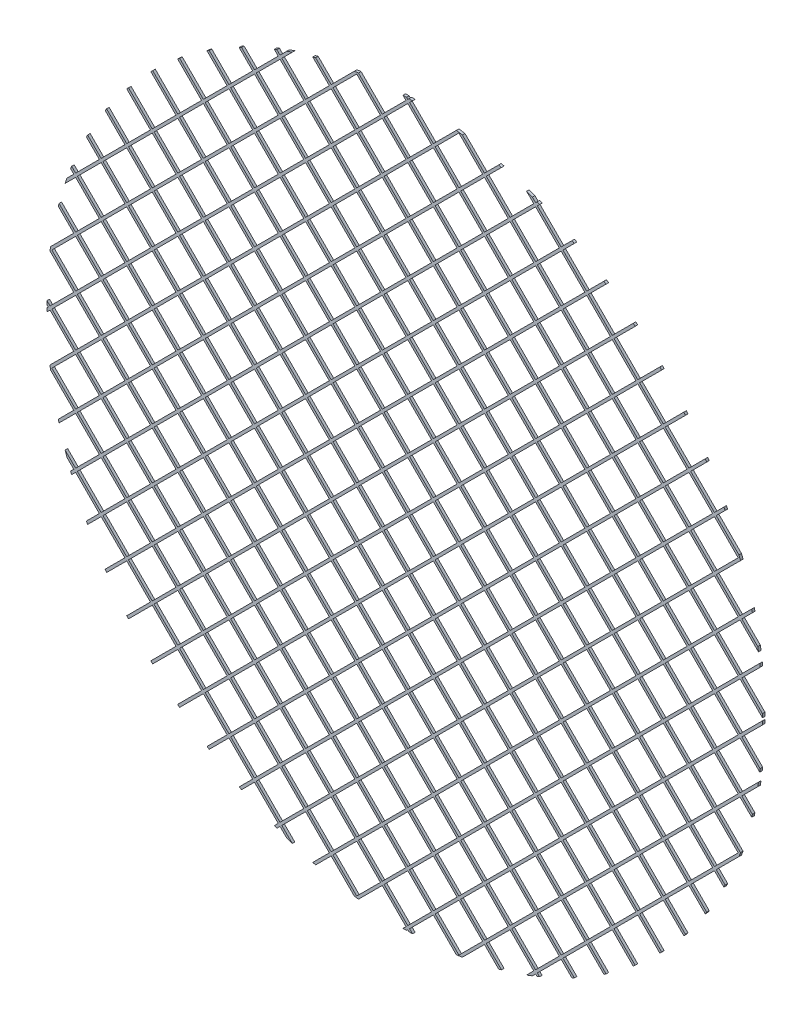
SolidWorks part; units mm, degrees
ref_plane "Front Plane" through (0, 0, 0) normal (0, 0, 1) x (1, 0, 0)
ref_plane "Top Plane" through (0, 0, 0) normal (0, 1, 0) x (1, 0, 0)
ref_plane "Right Plane" through (0, 0, 0) normal (1, 0, 0) x (0, 0, -1)
sketch "Sketch1" plane through (0, 0, 0) normal (0, 0, 1) x (1, 0, 0)
  line L202 (6.9999, -0.034) -> (6.5602, 0.4057)
  line L204 (6.9999, 0.0368) -> (6.5956, 0.4411)
  line L212 (6.9217, 1.0443) -> (6.5602, 1.4057)
  line L214 (6.9085, 1.1282) -> (6.5956, 1.4411)
  line L224 (6.5394, 2.4973) -> (6.0956, 2.9411)
  line L584 (-2.4398, 6.4764) -> (-2.3075, 6.6087)
  line L585 (-6.9302, 0.986) -> (-6.4751, 1.4411)
  line L587 (-2.4044, 6.4411) -> (-2.2003, 6.6452)
  line L590 (-6.6087, 2.3075) -> (-6.4751, 2.4411)
  line L592 (-6.6452, 2.2003) -> (-6.4398, 2.4057)
  line L596 (-5.439, 4.4065) -> (-5.4044, 4.4411)
  line L612 (-2.4398, 6.4764) -> (-2.5012, 6.5379)
  line L613 (-2.4751, 6.4411) -> (-2.5522, 6.5181)
  line L614 (-2.9398, 5.9764) -> (-2.4751, 6.4411)
  line L615 (-2.9044, 5.9411) -> (-2.4398, 6.4057)
  line L616 (-2.9398, 5.9764) -> (-3.1928, 6.2295)
  line L617 (-2.9751, 5.9411) -> (-3.2394, 6.2053)
  line L618 (-1.4398, 6.4764) -> (-0.986, 6.9302)
  line L619 (-1.4044, 6.4411) -> (-0.9398, 6.9057)
  line L620 (-1.4398, 6.4764) -> (-1.7429, 6.7796)
  line L621 (-1.4751, 6.4411) -> (-1.7989, 6.7649)
  line L622 (-0.9044, 6.9411) -> (-0.9041, 6.9414)
  line L623 (-0.4398, 6.4764) -> (0.0249, 6.9411)
  line L624 (-0.4044, 6.4411) -> (0.0602, 6.9057)
  line L625 (-0.4398, 6.4764) -> (-0.9046, 6.9413)
  line L626 (-0.4751, 6.4411) -> (-0.9398, 6.9057)
  line L627 (0.0602, 6.9764) -> (0.0833, 6.9995)
  line L628 (0.0956, 6.9411) -> (0.1528, 6.9983)
  line L629 (0.0602, 6.9764) -> (0.0368, 6.9999)
  line L630 (0.0249, 6.9411) -> (-0.034, 6.9999)
  line L631 (2.5602, 6.4764) -> (2.5879, 6.5041)
  line L632 (2.5956, 6.4411) -> (2.6383, 6.4838)
  line L633 (2.5602, 6.4764) -> (2.4973, 6.5394)
  line L634 (2.5249, 6.4411) -> (2.3846, 6.5813)
  line L635 (1.5602, 6.4764) -> (1.8381, 6.7544)
  line L636 (1.5956, 6.4411) -> (1.8935, 6.739)
  line L637 (1.5602, 6.4764) -> (1.1282, 6.9085)
  line L638 (1.5249, 6.4411) -> (1.0602, 6.9057)
  line L639 (0.5602, 6.4764) -> (1.0105, 6.9267)
  line L640 (0.5956, 6.4411) -> (1.0602, 6.9057)
  line L641 (0.5602, 6.4764) -> (0.0956, 6.9411)
  line L642 (0.5249, 6.4411) -> (0.0602, 6.9057)
  line L643 (-1.9398, 5.9764) -> (-1.4751, 6.4411)
  line L644 (-1.9044, 5.9411) -> (-1.4398, 6.4057)
  line L645 (-1.9398, 5.9764) -> (-2.4044, 6.4411)
  line L646 (-1.9751, 5.9411) -> (-2.4398, 6.4057)
  line L647 (-0.9398, 5.9764) -> (-0.4751, 6.4411)
  line L648 (-0.9044, 5.9411) -> (-0.4398, 6.4057)
  line L649 (-0.9398, 5.9764) -> (-1.4044, 6.4411)
  line L650 (-0.9751, 5.9411) -> (-1.4398, 6.4057)
  line L651 (0.0602, 5.9764) -> (0.5249, 6.4411)
  line L652 (0.0956, 5.9411) -> (0.5602, 6.4057)
  line L653 (0.0602, 5.9764) -> (-0.4044, 6.4411)
  line L654 (0.0249, 5.9411) -> (-0.4398, 6.4057)
  line L655 (1.0602, 5.9764) -> (1.5249, 6.4411)
  line L656 (1.0956, 5.9411) -> (1.5602, 6.4057)
  line L657 (1.0602, 5.9764) -> (0.5956, 6.4411)
  line L658 (1.0249, 5.9411) -> (0.5602, 6.4057)
  line L659 (2.0602, 5.9764) -> (2.5249, 6.4411)
  line L660 (2.0956, 5.9411) -> (2.5602, 6.4057)
  line L661 (2.0602, 5.9764) -> (1.5956, 6.4411)
  line L662 (2.0249, 5.9411) -> (1.5602, 6.4057)
  line L663 (3.0602, 5.9764) -> (3.272, 6.1882)
  line L664 (3.0956, 5.9411) -> (3.3181, 6.1636)
  line L665 (3.0602, 5.9764) -> (2.5956, 6.4411)
  line L666 (3.0249, 5.9411) -> (2.5602, 6.4057)
  line L667 (-3.4398, 5.4764) -> (-2.9751, 5.9411)
  line L668 (-3.4044, 5.4411) -> (-2.9398, 5.9057)
  line L669 (-3.4398, 5.4764) -> (-3.8255, 5.8622)
  line L670 (-3.4751, 5.4411) -> (-3.8682, 5.8341)
  line L671 (-2.4398, 5.4764) -> (-1.9751, 5.9411)
  line L672 (-2.4044, 5.4411) -> (-1.9398, 5.9057)
  line L673 (-2.4398, 5.4764) -> (-2.9044, 5.9411)
  line L674 (-2.4751, 5.4411) -> (-2.9398, 5.9057)
  line L675 (-1.4398, 5.4764) -> (-0.9751, 5.9411)
  line L676 (-1.4044, 5.4411) -> (-0.9398, 5.9057)
  line L677 (-1.4398, 5.4764) -> (-1.9044, 5.9411)
  line L678 (-1.4751, 5.4411) -> (-1.9398, 5.9057)
  line L679 (-0.4398, 5.4764) -> (0.0249, 5.9411)
  line L680 (-0.4044, 5.4411) -> (0.0602, 5.9057)
  line L681 (-0.4398, 5.4764) -> (-0.9044, 5.9411)
  line L682 (-0.4751, 5.4411) -> (-0.9398, 5.9057)
  line L683 (0.5602, 5.4764) -> (1.0249, 5.9411)
  line L684 (0.5956, 5.4411) -> (1.0602, 5.9057)
  line L685 (0.5602, 5.4764) -> (0.0956, 5.9411)
  line L686 (0.5249, 5.4411) -> (0.0602, 5.9057)
  line L687 (1.5602, 5.4764) -> (2.0249, 5.9411)
  line L688 (1.5956, 5.4411) -> (2.0602, 5.9057)
  line L689 (1.5602, 5.4764) -> (1.0956, 5.9411)
  line L690 (1.5249, 5.4411) -> (1.0602, 5.9057)
  line L691 (2.5602, 5.4764) -> (3.0249, 5.9411)
  line L692 (2.5956, 5.4411) -> (3.0602, 5.9057)
  line L693 (2.5602, 5.4764) -> (2.0956, 5.9411)
  line L694 (2.5249, 5.4411) -> (2.0602, 5.9057)
  line L695 (3.5602, 5.4764) -> (3.898, 5.8142)
  line L696 (3.5956, 5.4411) -> (3.9402, 5.7857)
  line L697 (3.5602, 5.4764) -> (3.0956, 5.9411)
  line L698 (3.5249, 5.4411) -> (3.0602, 5.9057)
  line L699 (4.0602, 4.9764) -> (4.4704, 5.3866)
  line L700 (4.0956, 4.9411) -> (4.5089, 5.3544)
  line L701 (4.0602, 4.9764) -> (3.5956, 5.4411)
  line L702 (4.0249, 4.9411) -> (3.5602, 5.4057)
  line L703 (3.0602, 4.9764) -> (2.5956, 5.4411)
  line L704 (3.0249, 4.9411) -> (2.5602, 5.4057)
  line L705 (3.0602, 4.9764) -> (3.5249, 5.4411)
  line L706 (3.0956, 4.9411) -> (3.5602, 5.4057)
  line L707 (2.0602, 4.9764) -> (2.5249, 5.4411)
  line L708 (2.0956, 4.9411) -> (2.5602, 5.4057)
  line L709 (2.0602, 4.9764) -> (1.5956, 5.4411)
  line L710 (2.0249, 4.9411) -> (1.5602, 5.4057)
  line L711 (1.0602, 4.9764) -> (1.5249, 5.4411)
  line L712 (1.0956, 4.9411) -> (1.5602, 5.4057)
  line L713 (1.0602, 4.9764) -> (0.5956, 5.4411)
  line L714 (1.0249, 4.9411) -> (0.5602, 5.4057)
  line L715 (0.0602, 4.9764) -> (0.5249, 5.4411)
  line L716 (0.0956, 4.9411) -> (0.5602, 5.4057)
  line L717 (0.0602, 4.9764) -> (-0.4044, 5.4411)
  line L718 (0.0249, 4.9411) -> (-0.4398, 5.4057)
  line L719 (-0.9398, 4.9764) -> (-0.4751, 5.4411)
  line L720 (-0.9044, 4.9411) -> (-0.4398, 5.4057)
  line L721 (-0.9398, 4.9764) -> (-1.4044, 5.4411)
  line L722 (-0.9751, 4.9411) -> (-1.4398, 5.4057)
  line L723 (-1.9398, 4.9764) -> (-1.4751, 5.4411)
  line L724 (-1.9044, 4.9411) -> (-1.4398, 5.4057)
  line L725 (-1.9398, 4.9764) -> (-2.4044, 5.4411)
  line L726 (-1.9751, 4.9411) -> (-2.4398, 5.4057)
  line L727 (-2.9398, 4.9764) -> (-2.4751, 5.4411)
  line L728 (-2.9044, 4.9411) -> (-2.4398, 5.4057)
  line L729 (-2.9398, 4.9764) -> (-3.4044, 5.4411)
  line L730 (-2.9751, 4.9411) -> (-3.4398, 5.4057)
  line L731 (-3.9398, 4.9764) -> (-3.4751, 5.4411)
  line L732 (-3.9044, 4.9411) -> (-3.4398, 5.4057)
  line L733 (-3.9398, 4.9764) -> (-4.4042, 5.4409)
  line L734 (-3.9751, 4.9411) -> (-4.4432, 5.4091)
  line L735 (-4.4398, 4.4764) -> (-3.9751, 4.9411)
  line L736 (-4.4044, 4.4411) -> (-3.9398, 4.9057)
  line L737 (-4.4398, 4.4764) -> (-4.9314, 4.968)
  line L738 (-4.4751, 4.4411) -> (-4.9667, 4.9327)
  line L739 (-3.4398, 4.4764) -> (-2.9751, 4.9411)
  line L740 (-3.4044, 4.4411) -> (-2.9398, 4.9057)
  line L741 (-3.4398, 4.4764) -> (-3.9044, 4.9411)
  line L742 (-3.4751, 4.4411) -> (-3.9398, 4.9057)
  line L743 (-2.4398, 4.4764) -> (-1.9751, 4.9411)
  line L744 (-2.4044, 4.4411) -> (-1.9398, 4.9057)
  line L745 (-2.4398, 4.4764) -> (-2.9044, 4.9411)
  line L746 (-2.4751, 4.4411) -> (-2.9398, 4.9057)
  line L747 (-1.4398, 4.4764) -> (-0.9751, 4.9411)
  line L748 (-1.4044, 4.4411) -> (-0.9398, 4.9057)
  line L749 (-1.4398, 4.4764) -> (-1.9044, 4.9411)
  line L750 (-1.4751, 4.4411) -> (-1.9398, 4.9057)
  line L751 (-0.4398, 4.4764) -> (0.0249, 4.9411)
  line L752 (-0.4044, 4.4411) -> (0.0602, 4.9057)
  line L753 (-0.4398, 4.4764) -> (-0.9044, 4.9411)
  line L754 (-0.4751, 4.4411) -> (-0.9398, 4.9057)
  line L755 (0.5602, 4.4764) -> (1.0249, 4.9411)
  line L756 (0.5956, 4.4411) -> (1.0602, 4.9057)
  line L757 (0.5602, 4.4764) -> (0.0956, 4.9411)
  line L758 (0.5249, 4.4411) -> (0.0602, 4.9057)
  line L759 (1.5602, 4.4764) -> (2.0249, 4.9411)
  line L760 (1.5956, 4.4411) -> (2.0602, 4.9057)
  line L761 (1.5602, 4.4764) -> (1.0956, 4.9411)
  line L762 (1.5249, 4.4411) -> (1.0602, 4.9057)
  line L763 (2.5602, 4.4764) -> (3.0249, 4.9411)
  line L764 (2.5956, 4.4411) -> (3.0602, 4.9057)
  line L765 (2.5602, 4.4764) -> (2.0956, 4.9411)
  line L766 (2.5249, 4.4411) -> (2.0602, 4.9057)
  line L767 (3.5602, 4.4764) -> (4.0249, 4.9411)
  line L768 (3.5956, 4.4411) -> (4.0602, 4.9057)
  line L769 (3.5602, 4.4764) -> (3.0956, 4.9411)
  line L770 (3.5249, 4.4411) -> (3.0602, 4.9057)
  line L771 (4.5602, 4.4764) -> (4.9915, 4.9077)
  line L772 (4.5956, 4.4411) -> (5.0264, 4.8719)
  line L773 (4.5602, 4.4764) -> (4.0956, 4.9411)
  line L774 (4.5249, 4.4411) -> (4.0602, 4.9057)
  line L775 (-4.9398, 3.9764) -> (-4.4751, 4.4411)
  line L776 (-4.9044, 3.9411) -> (-4.4398, 4.4057)
  line L777 (-4.9398, 3.9764) -> (-5.4079, 4.4446)
  line L778 (-4.9751, 3.9411) -> (-5.4397, 4.4056)
  line L779 (-3.9398, 3.9764) -> (-3.4751, 4.4411)
  line L780 (-3.9044, 3.9411) -> (-3.4398, 4.4057)
  line L781 (-3.9398, 3.9764) -> (-4.4044, 4.4411)
  line L782 (-3.9751, 3.9411) -> (-4.4398, 4.4057)
  line L783 (-2.9398, 3.9764) -> (-2.4751, 4.4411)
  line L784 (-2.9044, 3.9411) -> (-2.4398, 4.4057)
  line L785 (-2.9398, 3.9764) -> (-3.4044, 4.4411)
  line L786 (-2.9751, 3.9411) -> (-3.4398, 4.4057)
  line L787 (-1.9398, 3.9764) -> (-1.4751, 4.4411)
  line L788 (-1.9044, 3.9411) -> (-1.4398, 4.4057)
  line L789 (-1.9398, 3.9764) -> (-2.4044, 4.4411)
  line L790 (-1.9751, 3.9411) -> (-2.4398, 4.4057)
  line L791 (-0.9398, 3.9764) -> (-0.4751, 4.4411)
  line L792 (-0.9044, 3.9411) -> (-0.4398, 4.4057)
  line L793 (-0.9398, 3.9764) -> (-1.4044, 4.4411)
  line L794 (-0.9751, 3.9411) -> (-1.4398, 4.4057)
  line L795 (0.0602, 3.9764) -> (0.5249, 4.4411)
  line L796 (0.0956, 3.9411) -> (0.5602, 4.4057)
  line L797 (0.0602, 3.9764) -> (-0.4044, 4.4411)
  line L798 (0.0249, 3.9411) -> (-0.4398, 4.4057)
  line L799 (1.0602, 3.9764) -> (1.5249, 4.4411)
  line L800 (1.0956, 3.9411) -> (1.5602, 4.4057)
  line L801 (1.0249, 3.9411) -> (0.5602, 4.4057)
  line L802 (1.0602, 3.9764) -> (0.5956, 4.4411)
  line L803 (2.0602, 3.9764) -> (2.5249, 4.4411)
  line L804 (2.0956, 3.9411) -> (2.5602, 4.4057)
  line L805 (2.0602, 3.9764) -> (1.5956, 4.4411)
  line L806 (2.0249, 3.9411) -> (1.5602, 4.4057)
  line L807 (3.0602, 3.9764) -> (3.5249, 4.4411)
  line L808 (3.0956, 3.9411) -> (3.5602, 4.4057)
  line L809 (3.0602, 3.9764) -> (2.5956, 4.4411)
  line L810 (3.0249, 3.9411) -> (2.5602, 4.4057)
  line L811 (4.0602, 3.9764) -> (4.5249, 4.4411)
  line L812 (4.0956, 3.9411) -> (4.5602, 4.4057)
  line L813 (4.0602, 3.9764) -> (3.5956, 4.4411)
  line L814 (4.0249, 3.9411) -> (3.5602, 4.4057)
  line L815 (5.0602, 3.9764) -> (5.4619, 4.3781)
  line L816 (5.0956, 3.9411) -> (5.4932, 4.3387)
  line L817 (5.0602, 3.9764) -> (4.5956, 4.4411)
  line L818 (5.0249, 3.9411) -> (4.5602, 4.4057)
  line L819 (5.5602, 3.4764) -> (5.8807, 3.797)
  line L820 (5.5956, 3.4411) -> (5.9083, 3.7539)
  line L821 (5.5602, 3.4764) -> (5.0956, 3.9411)
  line L822 (5.5249, 3.4411) -> (5.0602, 3.9057)
  line L823 (4.5602, 3.4764) -> (5.0249, 3.9411)
  line L824 (4.5956, 3.4411) -> (5.0602, 3.9057)
  line L825 (4.5602, 3.4764) -> (4.0956, 3.9411)
  line L826 (4.5249, 3.4411) -> (4.0602, 3.9057)
  line L827 (3.5602, 3.4764) -> (4.0249, 3.9411)
  line L828 (3.5956, 3.4411) -> (4.0602, 3.9057)
  line L829 (3.5602, 3.4764) -> (3.0956, 3.9411)
  line L830 (3.5249, 3.4411) -> (3.0602, 3.9057)
  line L831 (2.5602, 3.4764) -> (3.0249, 3.9411)
  line L832 (2.5956, 3.4411) -> (3.0602, 3.9057)
  line L833 (2.5249, 3.4411) -> (2.0602, 3.9057)
  line L834 (2.5602, 3.4764) -> (2.0956, 3.9411)
  line L835 (1.5602, 3.4764) -> (2.0249, 3.9411)
  line L836 (1.5956, 3.4411) -> (2.0602, 3.9057)
  line L837 (1.5249, 3.4411) -> (1.0602, 3.9057)
  line L838 (1.5602, 3.4764) -> (1.0956, 3.9411)
  line L839 (0.5602, 3.4764) -> (1.0249, 3.9411)
  line L840 (0.5956, 3.4411) -> (1.0602, 3.9057)
  line L841 (0.5249, 3.4411) -> (0.0602, 3.9057)
  line L842 (0.5602, 3.4764) -> (0.0956, 3.9411)
  line L843 (-0.4398, 3.4764) -> (0.0249, 3.9411)
  line L844 (-0.4044, 3.4411) -> (0.0602, 3.9057)
  line L845 (-0.4398, 3.4764) -> (-0.9044, 3.9411)
  line L846 (-0.4751, 3.4411) -> (-0.9398, 3.9057)
  line L847 (-1.4398, 3.4764) -> (-0.9751, 3.9411)
  line L848 (-1.4044, 3.4411) -> (-0.9398, 3.9057)
  line L849 (-1.4398, 3.4764) -> (-1.9044, 3.9411)
  line L850 (-1.4751, 3.4411) -> (-1.9398, 3.9057)
  line L851 (-2.4398, 3.4764) -> (-1.9751, 3.9411)
  line L852 (-2.4044, 3.4411) -> (-1.9398, 3.9057)
  line L853 (-2.4751, 3.4411) -> (-2.9398, 3.9057)
  line L854 (-2.4398, 3.4764) -> (-2.9044, 3.9411)
  line L855 (-3.4398, 3.4764) -> (-2.9751, 3.9411)
  line L856 (-3.4044, 3.4411) -> (-2.9398, 3.9057)
  line L857 (-3.4398, 3.4764) -> (-3.9044, 3.9411)
  line L858 (-3.4751, 3.4411) -> (-3.9398, 3.9057)
  line L859 (-4.4398, 3.4764) -> (-3.9751, 3.9411)
  line L860 (-4.4044, 3.4411) -> (-3.9398, 3.9057)
  line L861 (-4.4398, 3.4764) -> (-4.9044, 3.9411)
  line L862 (-4.4751, 3.4411) -> (-4.9398, 3.9057)
  line L863 (-5.4398, 3.4764) -> (-4.9751, 3.9411)
  line L864 (-5.4044, 3.4411) -> (-4.9398, 3.9057)
  line L865 (-5.4398, 3.4764) -> (-5.8331, 3.8698)
  line L866 (-5.4751, 3.4411) -> (-5.8612, 3.8271)
  line L867 (-5.9398, 2.9764) -> (-5.4751, 3.4411)
  line L868 (-5.9044, 2.9411) -> (-5.4398, 3.4057)
  line L869 (-5.9398, 2.9764) -> (-6.2045, 3.2411)
  line L870 (-5.9751, 2.9411) -> (-6.2286, 3.1945)
  line L871 (-4.9398, 2.9764) -> (-4.4751, 3.4411)
  line L872 (-4.9044, 2.9411) -> (-4.4398, 3.4057)
  line L873 (-4.9398, 2.9764) -> (-5.4044, 3.4411)
  line L874 (-4.9751, 2.9411) -> (-5.4398, 3.4057)
  line L875 (-3.9398, 2.9764) -> (-3.4751, 3.4411)
  line L876 (-3.9044, 2.9411) -> (-3.4398, 3.4057)
  line L877 (-3.9398, 2.9764) -> (-4.4044, 3.4411)
  line L878 (-3.9751, 2.9411) -> (-4.4398, 3.4057)
  line L879 (-2.9398, 2.9764) -> (-2.4751, 3.4411)
  line L880 (-2.9044, 2.9411) -> (-2.4398, 3.4057)
  line L881 (-2.9751, 2.9411) -> (-3.4398, 3.4057)
  line L882 (-2.9398, 2.9764) -> (-3.4044, 3.4411)
  line L883 (-1.9398, 2.9764) -> (-1.4751, 3.4411)
  line L884 (-1.9044, 2.9411) -> (-1.4398, 3.4057)
  line L885 (-1.9398, 2.9764) -> (-2.4044, 3.4411)
  line L886 (-1.9751, 2.9411) -> (-2.4398, 3.4057)
  line L887 (-0.9398, 2.9764) -> (-0.4751, 3.4411)
  line L888 (-0.9044, 2.9411) -> (-0.4398, 3.4057)
  line L889 (-0.9751, 2.9411) -> (-1.4398, 3.4057)
  line L890 (-0.9398, 2.9764) -> (-1.4044, 3.4411)
  line L891 (0.0602, 2.9764) -> (0.5249, 3.4411)
  line L892 (0.0956, 2.9411) -> (0.5602, 3.4057)
  line L893 (0.0602, 2.9764) -> (-0.4044, 3.4411)
  line L894 (0.0249, 2.9411) -> (-0.4398, 3.4057)
  line L895 (1.0602, 2.9764) -> (1.5249, 3.4411)
  line L896 (1.0956, 2.9411) -> (1.5602, 3.4057)
  line L897 (1.0249, 2.9411) -> (0.5602, 3.4057)
  line L898 (1.0602, 2.9764) -> (0.5956, 3.4411)
  line L899 (2.0602, 2.9764) -> (2.5249, 3.4411)
  line L900 (2.0956, 2.9411) -> (2.5602, 3.4057)
  line L901 (2.0602, 2.9764) -> (1.5956, 3.4411)
  line L902 (2.0249, 2.9411) -> (1.5602, 3.4057)
  line L903 (3.0602, 2.9764) -> (3.5249, 3.4411)
  line L904 (3.0249, 2.9411) -> (2.5602, 3.4057)
  line L905 (3.0956, 2.9411) -> (3.5602, 3.4057)
  line L906 (3.0602, 2.9764) -> (2.5956, 3.4411)
  line L907 (4.0602, 2.9764) -> (4.5249, 3.4411)
  line L908 (4.0956, 2.9411) -> (4.5602, 3.4057)
  line L909 (4.0249, 2.9411) -> (3.5602, 3.4057)
  line L910 (4.0602, 2.9764) -> (3.5956, 3.4411)
  line L911 (5.0602, 2.9764) -> (5.5249, 3.4411)
  line L912 (5.0956, 2.9411) -> (5.5602, 3.4057)
  line L913 (5.0249, 2.9411) -> (4.5602, 3.4057)
  line L914 (5.0602, 2.9764) -> (4.5956, 3.4411)
  line L915 (6.0602, 2.9764) -> (6.2454, 3.1616)
  line L916 (6.0956, 2.9411) -> (6.269, 3.1145)
  line L917 (6.0602, 2.9764) -> (5.5956, 3.4411)
  line L918 (6.0249, 2.9411) -> (5.5602, 3.4057)
  line L919 (6.5249, 2.4411) -> (6.0602, 2.9057)
  line L920 (5.5602, 2.4764) -> (6.0249, 2.9411)
  line L921 (5.5956, 2.4411) -> (6.0602, 2.9057)
  line L922 (5.5602, 2.4764) -> (5.0956, 2.9411)
  line L923 (5.5249, 2.4411) -> (5.0602, 2.9057)
  line L924 (4.5602, 2.4764) -> (5.0249, 2.9411)
  line L925 (4.5956, 2.4411) -> (5.0602, 2.9057)
  line L926 (4.5249, 2.4411) -> (4.0602, 2.9057)
  line L927 (4.5602, 2.4764) -> (4.0956, 2.9411)
  line L928 (3.5602, 2.4764) -> (4.0249, 2.9411)
  line L929 (3.5956, 2.4411) -> (4.0602, 2.9057)
  line L930 (3.5249, 2.4411) -> (3.0602, 2.9057)
  line L931 (3.5602, 2.4764) -> (3.0956, 2.9411)
  line L932 (2.5602, 2.4764) -> (3.0249, 2.9411)
  line L933 (2.5956, 2.4411) -> (3.0602, 2.9057)
  line L934 (2.5602, 2.4764) -> (2.0956, 2.9411)
  line L935 (2.5249, 2.4411) -> (2.0602, 2.9057)
  line L936 (1.5602, 2.4764) -> (2.0249, 2.9411)
  line L937 (1.5956, 2.4411) -> (2.0602, 2.9057)
  line L938 (1.5602, 2.4764) -> (1.0956, 2.9411)
  line L939 (1.5249, 2.4411) -> (1.0602, 2.9057)
  line L940 (0.5602, 2.4764) -> (1.0249, 2.9411)
  line L941 (0.5956, 2.4411) -> (1.0602, 2.9057)
  line L942 (0.5249, 2.4411) -> (0.0602, 2.9057)
  line L943 (0.5602, 2.4764) -> (0.0956, 2.9411)
  line L944 (-0.4398, 2.4764) -> (0.0249, 2.9411)
  line L945 (-0.4044, 2.4411) -> (0.0602, 2.9057)
  line L946 (-0.4398, 2.4764) -> (-0.9044, 2.9411)
  line L947 (-0.4751, 2.4411) -> (-0.9398, 2.9057)
  line L948 (-1.4398, 2.4764) -> (-0.9751, 2.9411)
  line L949 (-1.4044, 2.4411) -> (-0.9398, 2.9057)
  line L950 (-1.4751, 2.4411) -> (-1.9398, 2.9057)
  line L951 (-1.4398, 2.4764) -> (-1.9044, 2.9411)
  line L952 (-2.4398, 2.4764) -> (-1.9751, 2.9411)
  line L953 (-2.4044, 2.4411) -> (-1.9398, 2.9057)
  line L954 (-2.4398, 2.4764) -> (-2.9044, 2.9411)
  line L955 (-2.4751, 2.4411) -> (-2.9398, 2.9057)
  line L956 (-3.4398, 2.4764) -> (-2.9751, 2.9411)
  line L957 (-3.4044, 2.4411) -> (-2.9398, 2.9057)
  line L958 (-3.4751, 2.4411) -> (-3.9398, 2.9057)
  line L959 (-3.4398, 2.4764) -> (-3.9044, 2.9411)
  line L960 (-4.4398, 2.4764) -> (-3.9751, 2.9411)
  line L961 (-4.4044, 2.4411) -> (-3.9398, 2.9057)
  line L962 (-4.4398, 2.4764) -> (-4.9044, 2.9411)
  line L963 (-4.4751, 2.4411) -> (-4.9398, 2.9057)
  line L964 (-5.4398, 2.4764) -> (-4.9751, 2.9411)
  line L965 (-5.4044, 2.4411) -> (-4.9398, 2.9057)
  line L966 (-5.4398, 2.4764) -> (-5.9044, 2.9411)
  line L967 (-5.4751, 2.4411) -> (-5.9398, 2.9057)
  line L968 (-6.4044, 2.4411) -> (-5.9398, 2.9057)
  line L969 (-6.4751, 2.4411) -> (-6.5372, 2.5031)
  line L970 (-6.4398, 2.4764) -> (-6.5174, 2.5541)
  line L971 (-6.4398, 2.4764) -> (-5.9751, 2.9411)
  line L972 (-5.9398, 1.9764) -> (-5.4751, 2.4411)
  line L973 (-5.9044, 1.9411) -> (-5.4398, 2.4057)
  line L974 (-5.9751, 1.9411) -> (-6.4398, 2.4057)
  line L975 (-5.9398, 1.9764) -> (-6.4044, 2.4411)
  line L976 (-4.9398, 1.9764) -> (-4.4751, 2.4411)
  line L977 (-4.9044, 1.9411) -> (-4.4398, 2.4057)
  line L978 (-4.9751, 1.9411) -> (-5.4398, 2.4057)
  line L979 (-4.9398, 1.9764) -> (-5.4044, 2.4411)
  line L980 (-3.9398, 1.9764) -> (-3.4751, 2.4411)
  line L981 (-3.9044, 1.9411) -> (-3.4398, 2.4057)
  line L982 (-3.9398, 1.9764) -> (-4.4044, 2.4411)
  line L983 (-3.9751, 1.9411) -> (-4.4398, 2.4057)
  line L984 (-2.9398, 1.9764) -> (-2.4751, 2.4411)
  line L985 (-2.9044, 1.9411) -> (-2.4398, 2.4057)
  line L986 (-2.9398, 1.9764) -> (-3.4044, 2.4411)
  line L987 (-2.9751, 1.9411) -> (-3.4398, 2.4057)
  line L988 (-1.9398, 1.9764) -> (-1.4751, 2.4411)
  line L989 (-1.9044, 1.9411) -> (-1.4398, 2.4057)
  line L990 (-1.9751, 1.9411) -> (-2.4398, 2.4057)
  line L991 (-1.9398, 1.9764) -> (-2.4044, 2.4411)
  line L992 (-0.9398, 1.9764) -> (-0.4751, 2.4411)
  line L993 (-0.9398, 1.9764) -> (-1.4044, 2.4411)
  line L994 (-0.9044, 1.9411) -> (-0.4398, 2.4057)
  line L995 (-0.9751, 1.9411) -> (-1.4398, 2.4057)
  line L996 (0.0602, 1.9764) -> (0.5249, 2.4411)
  line L997 (0.0956, 1.9411) -> (0.5602, 2.4057)
  line L998 (0.0249, 1.9411) -> (-0.4398, 2.4057)
  line L999 (0.0602, 1.9764) -> (-0.4044, 2.4411)
  line L1000 (1.0602, 1.9764) -> (1.5249, 2.4411)
  line L1001 (1.0249, 1.9411) -> (0.5602, 2.4057)
  line L1002 (1.0602, 1.9764) -> (0.5956, 2.4411)
  line L1003 (1.0956, 1.9411) -> (1.5602, 2.4057)
  line L1004 (2.0602, 1.9764) -> (2.5249, 2.4411)
  line L1005 (2.0956, 1.9411) -> (2.5602, 2.4057)
  line L1006 (2.0602, 1.9764) -> (1.5956, 2.4411)
  line L1007 (2.0249, 1.9411) -> (1.5602, 2.4057)
  line L1008 (3.0602, 1.9764) -> (3.5249, 2.4411)
  line L1009 (3.0956, 1.9411) -> (3.5602, 2.4057)
  line L1010 (3.0602, 1.9764) -> (2.5956, 2.4411)
  line L1011 (3.0249, 1.9411) -> (2.5602, 2.4057)
  line L1012 (4.0602, 1.9764) -> (4.5249, 2.4411)
  line L1013 (4.0956, 1.9411) -> (4.5602, 2.4057)
  line L1014 (4.0602, 1.9764) -> (3.5956, 2.4411)
  line L1015 (4.0249, 1.9411) -> (3.5602, 2.4057)
  line L1016 (5.0602, 1.9764) -> (5.5249, 2.4411)
  line L1017 (5.0249, 1.9411) -> (4.5602, 2.4057)
  line L1018 (5.0602, 1.9764) -> (4.5956, 2.4411)
  line L1019 (5.0956, 1.9411) -> (5.5602, 2.4057)
  line L1020 (6.0602, 1.9764) -> (6.5249, 2.4411)
  line L1021 (6.0602, 1.9764) -> (5.5956, 2.4411)
  line L1022 (6.0249, 1.9411) -> (5.5602, 2.4057)
  line L1023 (6.0956, 1.9411) -> (6.57, 2.4155)
  line L1024 (6.5602, 1.4764) -> (6.7891, 1.7053)
  line L1025 (6.5956, 1.4411) -> (6.8031, 1.6486)
  line L1026 (6.5602, 1.4764) -> (6.0956, 1.9411)
  line L1027 (6.5249, 1.4411) -> (6.0602, 1.9057)
  line L1028 (5.5602, 1.4764) -> (6.0249, 1.9411)
  line L1029 (5.5956, 1.4411) -> (6.0602, 1.9057)
  line L1030 (5.5602, 1.4764) -> (5.0956, 1.9411)
  line L1031 (5.5249, 1.4411) -> (5.0602, 1.9057)
  line L1032 (4.5602, 1.4764) -> (5.0249, 1.9411)
  line L1033 (4.5956, 1.4411) -> (5.0602, 1.9057)
  line L1034 (4.5602, 1.4764) -> (4.0956, 1.9411)
  line L1035 (4.5249, 1.4411) -> (4.0602, 1.9057)
  line L1036 (3.5602, 1.4764) -> (4.0249, 1.9411)
  line L1037 (3.5956, 1.4411) -> (4.0602, 1.9057)
  line L1038 (3.5602, 1.4764) -> (3.0956, 1.9411)
  line L1039 (3.5249, 1.4411) -> (3.0602, 1.9057)
  line L1040 (2.5602, 1.4764) -> (3.0249, 1.9411)
  line L1041 (2.5602, 1.4764) -> (2.0956, 1.9411)
  line L1042 (2.5956, 1.4411) -> (3.0602, 1.9057)
  line L1043 (2.5249, 1.4411) -> (2.0602, 1.9057)
  line L1044 (1.5602, 1.4764) -> (1.0956, 1.9411)
  line L1045 (1.5249, 1.4411) -> (1.0602, 1.9057)
  line L1046 (1.5602, 1.4764) -> (2.0249, 1.9411)
  line L1047 (1.5956, 1.4411) -> (2.0602, 1.9057)
  line L1048 (0.5602, 1.4764) -> (0.0956, 1.9411)
  line L1049 (0.5249, 1.4411) -> (0.0602, 1.9057)
  line L1050 (0.5602, 1.4764) -> (1.0249, 1.9411)
  line L1051 (0.5956, 1.4411) -> (1.0602, 1.9057)
  line L1052 (-0.4398, 1.4764) -> (0.0249, 1.9411)
  line L1053 (-0.4044, 1.4411) -> (0.0602, 1.9057)
  line L1054 (-0.4751, 1.4411) -> (-0.9398, 1.9057)
  line L1055 (-0.4398, 1.4764) -> (-0.9044, 1.9411)
  line L1056 (-1.4398, 1.4764) -> (-0.9751, 1.9411)
  line L1057 (-1.4751, 1.4411) -> (-1.9398, 1.9057)
  line L1058 (-1.4398, 1.4764) -> (-1.9044, 1.9411)
  line L1059 (-1.4044, 1.4411) -> (-0.9398, 1.9057)
  line L1060 (-2.4398, 1.4764) -> (-1.9751, 1.9411)
  line L1061 (-2.4044, 1.4411) -> (-1.9398, 1.9057)
  line L1062 (-2.4398, 1.4764) -> (-2.9044, 1.9411)
  line L1063 (-2.4751, 1.4411) -> (-2.9398, 1.9057)
  line L1064 (-3.4398, 1.4764) -> (-2.9751, 1.9411)
  line L1065 (-3.4044, 1.4411) -> (-2.9398, 1.9057)
  line L1066 (-3.4751, 1.4411) -> (-3.9398, 1.9057)
  line L1067 (-3.4398, 1.4764) -> (-3.9044, 1.9411)
  line L1068 (-4.4398, 1.4764) -> (-3.9751, 1.9411)
  line L1069 (-4.4044, 1.4411) -> (-3.9398, 1.9057)
  line L1070 (-4.4398, 1.4764) -> (-4.9044, 1.9411)
  line L1071 (-4.4751, 1.4411) -> (-4.9398, 1.9057)
  line L1072 (-5.4398, 1.4764) -> (-4.9751, 1.9411)
  line L1073 (-5.4044, 1.4411) -> (-4.9398, 1.9057)
  line L1074 (-5.4398, 1.4764) -> (-5.9044, 1.9411)
  line L1075 (-5.4751, 1.4411) -> (-5.9398, 1.9057)
  line L1076 (-6.4398, 1.4764) -> (-5.9751, 1.9411)
  line L1077 (-6.4044, 1.4411) -> (-5.9398, 1.9057)
  line L1078 (-6.4398, 1.4764) -> (-6.7643, 1.801)
  line L1079 (-6.4751, 1.4411) -> (-6.779, 1.745)
  line L1080 (-6.9044, 0.9411) -> (-6.4398, 1.4057)
  line L1082 (-5.9398, 0.9764) -> (-5.4751, 1.4411)
  line L1083 (-5.9044, 0.9411) -> (-5.4398, 1.4057)
  line L1084 (-5.9751, 0.9411) -> (-6.4398, 1.4057)
  line L1085 (-5.9398, 0.9764) -> (-6.4044, 1.4411)
  line L1086 (-4.9398, 0.9764) -> (-4.4751, 1.4411)
  line L1087 (-4.9044, 0.9411) -> (-4.4398, 1.4057)
  line L1088 (-4.9751, 0.9411) -> (-5.4398, 1.4057)
  line L1089 (-4.9398, 0.9764) -> (-5.4044, 1.4411)
  line L1090 (-3.9398, 0.9764) -> (-3.4751, 1.4411)
  line L1091 (-3.9044, 0.9411) -> (-3.4398, 1.4057)
  line L1092 (-3.9751, 0.9411) -> (-4.4398, 1.4057)
  line L1093 (-3.9398, 0.9764) -> (-4.4044, 1.4411)
  line L1094 (-2.9398, 0.9764) -> (-2.4751, 1.4411)
  line L1095 (-2.9044, 0.9411) -> (-2.4398, 1.4057)
  line L1096 (-2.9751, 0.9411) -> (-3.4398, 1.4057)
  line L1097 (-2.9398, 0.9764) -> (-3.4044, 1.4411)
  line L1098 (-1.9398, 0.9764) -> (-1.4751, 1.4411)
  line L1099 (-1.9044, 0.9411) -> (-1.4398, 1.4057)
  line L1100 (-1.9751, 0.9411) -> (-2.4398, 1.4057)
  line L1101 (-1.9398, 0.9764) -> (-2.4044, 1.4411)
  line L1102 (-0.9398, 0.9764) -> (-0.4751, 1.4411)
  line L1103 (-0.9044, 0.9411) -> (-0.4398, 1.4057)
  line L1104 (-0.9751, 0.9411) -> (-1.4398, 1.4057)
  line L1105 (-0.9398, 0.9764) -> (-1.4044, 1.4411)
  line L1106 (0.0602, 0.9764) -> (0.5249, 1.4411)
  line L1107 (0.0956, 0.9411) -> (0.5602, 1.4057)
  line L1108 (0.0249, 0.9411) -> (-0.4398, 1.4057)
  line L1109 (0.0602, 0.9764) -> (-0.4044, 1.4411)
  line L1110 (1.0602, 0.9764) -> (1.5249, 1.4411)
  line L1111 (1.0956, 0.9411) -> (1.5602, 1.4057)
  line L1112 (1.0249, 0.9411) -> (0.5602, 1.4057)
  line L1113 (1.0602, 0.9764) -> (0.5956, 1.4411)
  line L1114 (2.0602, 0.9764) -> (2.5249, 1.4411)
  line L1115 (2.0956, 0.9411) -> (2.5602, 1.4057)
  line L1116 (2.0249, 0.9411) -> (1.5602, 1.4057)
  line L1117 (2.0602, 0.9764) -> (1.5956, 1.4411)
  line L1118 (3.0602, 0.9764) -> (3.5249, 1.4411)
  line L1119 (3.0956, 0.9411) -> (3.5602, 1.4057)
  line L1120 (3.0249, 0.9411) -> (2.5602, 1.4057)
  line L1121 (3.0602, 0.9764) -> (2.5956, 1.4411)
  line L1122 (4.0602, 0.9764) -> (4.5249, 1.4411)
  line L1123 (4.0956, 0.9411) -> (4.5602, 1.4057)
  line L1124 (4.0249, 0.9411) -> (3.5602, 1.4057)
  line L1125 (4.0602, 0.9764) -> (3.5956, 1.4411)
  line L1126 (5.0602, 0.9764) -> (5.5249, 1.4411)
  line L1127 (5.0956, 0.9411) -> (5.5602, 1.4057)
  line L1128 (5.0249, 0.9411) -> (4.5602, 1.4057)
  line L1129 (5.0602, 0.9764) -> (4.5956, 1.4411)
  line L1130 (6.0602, 0.9764) -> (6.5249, 1.4411)
  line L1131 (6.0956, 0.9411) -> (6.5602, 1.4057)
  line L1132 (6.0249, 0.9411) -> (5.5602, 1.4057)
  line L1133 (6.0602, 0.9764) -> (5.5956, 1.4411)
  line L1134 (6.5956, 0.4411) -> (6.9542, 0.7997)
  line L1135 (6.5602, 0.4764) -> (6.9466, 0.8628)
  line L1136 (6.5602, 0.4764) -> (6.0956, 0.9411)
  line L1137 (6.5249, 0.4411) -> (6.0602, 0.9057)
  line L1138 (5.5602, 0.4764) -> (6.0249, 0.9411)
  line L1139 (5.5956, 0.4411) -> (6.0602, 0.9057)
  line L1140 (5.5249, 0.4411) -> (5.0602, 0.9057)
  line L1141 (5.5602, 0.4764) -> (5.0956, 0.9411)
  line L1142 (4.5602, 0.4764) -> (5.0249, 0.9411)
  line L1143 (4.5956, 0.4411) -> (5.0602, 0.9057)
  line L1144 (4.5249, 0.4411) -> (4.0602, 0.9057)
  line L1145 (4.5602, 0.4764) -> (4.0956, 0.9411)
  line L1146 (3.5602, 0.4764) -> (4.0249, 0.9411)
  line L1147 (3.5956, 0.4411) -> (4.0602, 0.9057)
  line L1148 (3.5249, 0.4411) -> (3.0602, 0.9057)
  line L1149 (3.5602, 0.4764) -> (3.0956, 0.9411)
  line L1150 (2.5602, 0.4764) -> (3.0249, 0.9411)
  line L1151 (2.5956, 0.4411) -> (3.0602, 0.9057)
  line L1152 (2.5249, 0.4411) -> (2.0602, 0.9057)
  line L1153 (2.5602, 0.4764) -> (2.0956, 0.9411)
  line L1154 (1.5602, 0.4764) -> (2.0249, 0.9411)
  line L1155 (1.5956, 0.4411) -> (2.0602, 0.9057)
  line L1156 (1.5249, 0.4411) -> (1.0602, 0.9057)
  line L1157 (1.5602, 0.4764) -> (1.0956, 0.9411)
  line L1158 (0.5602, 0.4764) -> (1.0249, 0.9411)
  line L1159 (0.5956, 0.4411) -> (1.0602, 0.9057)
  line L1160 (0.5249, 0.4411) -> (0.0602, 0.9057)
  line L1161 (0.5602, 0.4764) -> (0.0956, 0.9411)
  line L1162 (-0.4398, 0.4764) -> (0.0249, 0.9411)
  line L1163 (-0.4044, 0.4411) -> (0.0602, 0.9057)
  line L1164 (-0.4751, 0.4411) -> (-0.9398, 0.9057)
  line L1165 (-0.4398, 0.4764) -> (-0.9044, 0.9411)
  line L1166 (-1.4398, 0.4764) -> (-0.9751, 0.9411)
  line L1167 (-1.4044, 0.4411) -> (-0.9398, 0.9057)
  line L1168 (-1.4751, 0.4411) -> (-1.9398, 0.9057)
  line L1169 (-1.4398, 0.4764) -> (-1.9044, 0.9411)
  line L1170 (-2.4398, 0.4764) -> (-1.9751, 0.9411)
  line L1171 (-2.4044, 0.4411) -> (-1.9398, 0.9057)
  line L1172 (-2.4751, 0.4411) -> (-2.9398, 0.9057)
  line L1173 (-2.4398, 0.4764) -> (-2.9044, 0.9411)
  line L1174 (-3.4398, 0.4764) -> (-2.9751, 0.9411)
  line L1175 (-3.4044, 0.4411) -> (-2.9398, 0.9057)
  line L1176 (-3.4751, 0.4411) -> (-3.9398, 0.9057)
  line L1177 (-3.4398, 0.4764) -> (-3.9044, 0.9411)
  line L1178 (-4.4398, 0.4764) -> (-3.9751, 0.9411)
  line L1179 (-4.4044, 0.4411) -> (-3.9398, 0.9057)
  line L1180 (-4.4751, 0.4411) -> (-4.9398, 0.9057)
  line L1181 (-4.4398, 0.4764) -> (-4.9044, 0.9411)
  line L1182 (-5.4398, 0.4764) -> (-4.9751, 0.9411)
  line L1183 (-5.4044, 0.4411) -> (-4.9398, 0.9057)
  line L1184 (-5.4398, 0.4764) -> (-5.9044, 0.9411)
  line L1185 (-5.4751, 0.4411) -> (-5.9398, 0.9057)
  line L1186 (-6.4398, 0.4764) -> (-5.9751, 0.9411)
  line L1187 (-6.4044, 0.4411) -> (-5.9398, 0.9057)
  line L1188 (-6.4398, 0.4764) -> (-6.9044, 0.9411)
  line L1189 (-6.4751, 0.4411) -> (-6.941, 0.9069)
  line L1190 (-6.9044, -0.0589) -> (-6.4398, 0.4057)
  line L1191 (-6.9751, -0.0589) -> (-6.9999, -0.0341)
  line L1192 (-6.9398, -0.0236) -> (-6.4751, 0.4411)
  line L1193 (-6.9398, -0.0236) -> (-6.9999, 0.0366)
  line L1194 (-5.9398, -0.0236) -> (-5.4751, 0.4411)
  line L1195 (-5.9044, -0.0589) -> (-5.4398, 0.4057)
  line L1196 (-5.9751, -0.0589) -> (-6.4398, 0.4057)
  line L1197 (-5.9398, -0.0236) -> (-6.4044, 0.4411)
  line L1198 (-4.9398, -0.0236) -> (-4.4751, 0.4411)
  line L1199 (-4.9044, -0.0589) -> (-4.4398, 0.4057)
  line L1200 (-4.9751, -0.0589) -> (-5.4398, 0.4057)
  line L1201 (-4.9398, -0.0236) -> (-5.4044, 0.4411)
  line L1202 (-3.9398, -0.0236) -> (-3.4751, 0.4411)
  line L1203 (-3.9044, -0.0589) -> (-3.4398, 0.4057)
  line L1204 (-3.9751, -0.0589) -> (-4.4398, 0.4057)
  line L1205 (-3.9398, -0.0236) -> (-4.4044, 0.4411)
  line L1206 (-2.9398, -0.0236) -> (-2.4751, 0.4411)
  line L1207 (-2.9044, -0.0589) -> (-2.4398, 0.4057)
  line L1208 (-2.9751, -0.0589) -> (-3.4398, 0.4057)
  line L1209 (-2.9398, -0.0236) -> (-3.4044, 0.4411)
  line L1210 (-1.9398, -0.0236) -> (-1.4751, 0.4411)
  line L1211 (-1.9044, -0.0589) -> (-1.4398, 0.4057)
  line L1212 (-1.9751, -0.0589) -> (-2.4398, 0.4057)
  line L1213 (-1.9398, -0.0236) -> (-2.4044, 0.4411)
  line L1214 (-0.9398, -0.0236) -> (-0.4751, 0.4411)
  line L1215 (-0.9044, -0.0589) -> (-0.4398, 0.4057)
  line L1216 (-0.9751, -0.0589) -> (-1.4398, 0.4057)
  line L1217 (-0.9398, -0.0236) -> (-1.4044, 0.4411)
  line L1218 (0.0602, -0.0236) -> (0.5249, 0.4411)
  line L1219 (0.0956, -0.0589) -> (0.5602, 0.4057)
  line L1220 (0.0602, -0.0236) -> (-0.4044, 0.4411)
  line L1221 (0.0249, -0.0589) -> (-0.4398, 0.4057)
  line L1222 (1.0602, -0.0236) -> (1.5249, 0.4411)
  line L1223 (1.0956, -0.0589) -> (1.5602, 0.4057)
  line L1224 (1.0602, -0.0236) -> (0.5956, 0.4411)
  line L1225 (1.0249, -0.0589) -> (0.5602, 0.4057)
  line L1226 (2.0602, -0.0236) -> (2.5249, 0.4411)
  line L1227 (2.0956, -0.0589) -> (2.5602, 0.4057)
  line L1228 (2.0249, -0.0589) -> (1.5602, 0.4057)
  line L1229 (2.0602, -0.0236) -> (1.5956, 0.4411)
  line L1230 (3.0602, -0.0236) -> (3.5249, 0.4411)
  line L1231 (3.0602, -0.0236) -> (2.5956, 0.4411)
  line L1232 (3.0956, -0.0589) -> (3.5602, 0.4057)
  line L1233 (3.0249, -0.0589) -> (2.5602, 0.4057)
  line L1234 (4.0602, -0.0236) -> (4.5249, 0.4411)
  line L1235 (4.0602, -0.0236) -> (3.5956, 0.4411)
  line L1236 (4.0956, -0.0589) -> (4.5602, 0.4057)
  line L1237 (4.0249, -0.0589) -> (3.5602, 0.4057)
  line L1238 (5.0602, -0.0236) -> (5.5249, 0.4411)
  line L1239 (5.0602, -0.0236) -> (4.5956, 0.4411)
  line L1240 (5.0956, -0.0589) -> (5.5602, 0.4057)
  line L1241 (5.0249, -0.0589) -> (4.5602, 0.4057)
  line L1242 (6.0602, -0.0236) -> (6.5249, 0.4411)
  line L1243 (6.0602, -0.0236) -> (5.5956, 0.4411)
  line L1244 (6.0956, -0.0589) -> (6.5602, 0.4057)
  line L1245 (6.0249, -0.0589) -> (5.5602, 0.4057)
  line L1246 (-8.6736, -0.0589) -> (8.8647, -0.0589) construction
  line L1247 (6.0249, -0.0589) -> (5.5602, -0.5236)
  line L1248 (6.0956, -0.0589) -> (6.5602, -0.5236)
  line L1249 (6.0602, -0.0943) -> (5.5956, -0.5589)
  line L1250 (6.0602, -0.0943) -> (6.5249, -0.5589)
  line L1251 (5.0249, -0.0589) -> (4.5602, -0.5236)
  line L1252 (5.0956, -0.0589) -> (5.5602, -0.5236)
  line L1253 (5.0602, -0.0943) -> (4.5956, -0.5589)
  line L1254 (5.0602, -0.0943) -> (5.5249, -0.5589)
  line L1255 (4.0249, -0.0589) -> (3.5602, -0.5236)
  line L1256 (4.0956, -0.0589) -> (4.5602, -0.5236)
  line L1257 (4.0602, -0.0943) -> (3.5956, -0.5589)
  line L1258 (4.0602, -0.0943) -> (4.5249, -0.5589)
  line L1259 (3.0249, -0.0589) -> (2.5602, -0.5236)
  line L1260 (3.0956, -0.0589) -> (3.5602, -0.5236)
  line L1261 (3.0602, -0.0943) -> (2.5956, -0.5589)
  line L1262 (3.0602, -0.0943) -> (3.5249, -0.5589)
  line L1263 (2.0602, -0.0943) -> (1.5956, -0.5589)
  line L1264 (2.0249, -0.0589) -> (1.5602, -0.5236)
  line L1265 (2.0956, -0.0589) -> (2.5602, -0.5236)
  line L1266 (2.0602, -0.0943) -> (2.5249, -0.5589)
  line L1267 (1.0249, -0.0589) -> (0.5602, -0.5236)
  line L1268 (1.0602, -0.0943) -> (0.5956, -0.5589)
  line L1269 (1.0956, -0.0589) -> (1.5602, -0.5236)
  line L1270 (1.0602, -0.0943) -> (1.5249, -0.5589)
  line L1271 (0.0249, -0.0589) -> (-0.4398, -0.5236)
  line L1272 (0.0602, -0.0943) -> (-0.4044, -0.5589)
  line L1273 (0.0956, -0.0589) -> (0.5602, -0.5236)
  line L1274 (0.0602, -0.0943) -> (0.5249, -0.5589)
  line L1275 (-0.9398, -0.0943) -> (-1.4044, -0.5589)
  line L1276 (-0.9751, -0.0589) -> (-1.4398, -0.5236)
  line L1277 (-0.9044, -0.0589) -> (-0.4398, -0.5236)
  line L1278 (-0.9398, -0.0943) -> (-0.4751, -0.5589)
  line L1279 (-1.9398, -0.0943) -> (-2.4044, -0.5589)
  line L1280 (-1.9751, -0.0589) -> (-2.4398, -0.5236)
  line L1281 (-1.9044, -0.0589) -> (-1.4398, -0.5236)
  line L1282 (-1.9398, -0.0943) -> (-1.4751, -0.5589)
  line L1283 (-2.9398, -0.0943) -> (-3.4044, -0.5589)
  line L1284 (-2.9751, -0.0589) -> (-3.4398, -0.5236)
  line L1285 (-2.9044, -0.0589) -> (-2.4398, -0.5236)
  line L1286 (-2.9398, -0.0943) -> (-2.4751, -0.5589)
  line L1287 (-3.9398, -0.0943) -> (-4.4044, -0.5589)
  line L1288 (-3.9751, -0.0589) -> (-4.4398, -0.5236)
  line L1289 (-3.9044, -0.0589) -> (-3.4398, -0.5236)
  line L1290 (-3.9398, -0.0943) -> (-3.4751, -0.5589)
  line L1291 (-4.9398, -0.0943) -> (-5.4044, -0.5589)
  line L1292 (-4.9751, -0.0589) -> (-5.4398, -0.5236)
  line L1293 (-4.9044, -0.0589) -> (-4.4398, -0.5236)
  line L1294 (-4.9398, -0.0943) -> (-4.4751, -0.5589)
  line L1295 (-5.9398, -0.0943) -> (-6.4044, -0.5589)
  line L1296 (-5.9751, -0.0589) -> (-6.4398, -0.5236)
  line L1297 (-5.9044, -0.0589) -> (-5.4398, -0.5236)
  line L1298 (-5.9398, -0.0943) -> (-5.4751, -0.5589)
  line L1299 (-6.9398, -0.0943) -> (-6.9999, -0.1544)
  line L1300 (-6.9398, -0.0943) -> (-6.4751, -0.5589)
  line L1301 (-6.9751, -0.0589) -> (-6.9999, -0.0837)
  line L1302 (-6.9044, -0.0589) -> (-6.4398, -0.5236)
  line L1303 (-6.4751, -0.5589) -> (-6.941, -1.0248)
  line L1304 (-6.4398, -0.5943) -> (-6.9044, -1.0589)
  line L1305 (-6.4044, -0.5589) -> (-5.9398, -1.0236)
  line L1306 (-6.4398, -0.5943) -> (-5.9751, -1.0589)
  line L1307 (-5.4751, -0.5589) -> (-5.9398, -1.0236)
  line L1308 (-5.4398, -0.5943) -> (-5.9044, -1.0589)
  line L1309 (-5.4044, -0.5589) -> (-4.9398, -1.0236)
  line L1310 (-5.4398, -0.5943) -> (-4.9751, -1.0589)
  line L1311 (-4.4398, -0.5943) -> (-4.9044, -1.0589)
  line L1312 (-4.4751, -0.5589) -> (-4.9398, -1.0236)
  line L1313 (-4.4044, -0.5589) -> (-3.9398, -1.0236)
  line L1314 (-4.4398, -0.5943) -> (-3.9751, -1.0589)
  line L1315 (-3.4398, -0.5943) -> (-3.9044, -1.0589)
  line L1316 (-3.4751, -0.5589) -> (-3.9398, -1.0236)
  line L1317 (-3.4044, -0.5589) -> (-2.9398, -1.0236)
  line L1318 (-3.4398, -0.5943) -> (-2.9751, -1.0589)
  line L1319 (-2.4398, -0.5943) -> (-2.9044, -1.0589)
  line L1320 (-2.4751, -0.5589) -> (-2.9398, -1.0236)
  line L1321 (-2.4044, -0.5589) -> (-1.9398, -1.0236)
  line L1322 (-2.4398, -0.5943) -> (-1.9751, -1.0589)
  line L1323 (-1.4398, -0.5943) -> (-1.9044, -1.0589)
  line L1324 (-1.4751, -0.5589) -> (-1.9398, -1.0236)
  line L1325 (-1.4044, -0.5589) -> (-0.9398, -1.0236)
  line L1326 (-1.4398, -0.5943) -> (-0.9751, -1.0589)
  line L1327 (-0.4398, -0.5943) -> (-0.9044, -1.0589)
  line L1328 (-0.4751, -0.5589) -> (-0.9398, -1.0236)
  line L1329 (-0.4044, -0.5589) -> (0.0602, -1.0236)
  line L1330 (-0.4398, -0.5943) -> (0.0249, -1.0589)
  line L1331 (0.5602, -0.5943) -> (0.0956, -1.0589)
  line L1332 (0.5249, -0.5589) -> (0.0602, -1.0236)
  line L1333 (0.5956, -0.5589) -> (1.0602, -1.0236)
  line L1334 (0.5602, -0.5943) -> (1.0249, -1.0589)
  line L1335 (1.5602, -0.5943) -> (1.0956, -1.0589)
  line L1336 (1.5249, -0.5589) -> (1.0602, -1.0236)
  line L1337 (1.5956, -0.5589) -> (2.0602, -1.0236)
  line L1338 (1.5602, -0.5943) -> (2.0249, -1.0589)
  line L1339 (2.5602, -0.5943) -> (2.0956, -1.0589)
  line L1340 (2.5249, -0.5589) -> (2.0602, -1.0236)
  line L1341 (2.5956, -0.5589) -> (3.0602, -1.0236)
  line L1342 (2.5602, -0.5943) -> (3.0249, -1.0589)
  line L1343 (3.5602, -0.5943) -> (3.0956, -1.0589)
  line L1344 (3.5249, -0.5589) -> (3.0602, -1.0236)
  line L1345 (3.5956, -0.5589) -> (4.0602, -1.0236)
  line L1346 (3.5602, -0.5943) -> (4.0249, -1.0589)
  line L1347 (4.5602, -0.5943) -> (4.0956, -1.0589)
  line L1348 (4.5249, -0.5589) -> (4.0602, -1.0236)
  line L1349 (4.5956, -0.5589) -> (5.0602, -1.0236)
  line L1350 (4.5602, -0.5943) -> (5.0249, -1.0589)
  line L1351 (5.5602, -0.5943) -> (5.0956, -1.0589)
  line L1352 (5.5249, -0.5589) -> (5.0602, -1.0236)
  line L1353 (5.5956, -0.5589) -> (6.0602, -1.0236)
  line L1354 (5.5602, -0.5943) -> (6.0249, -1.0589)
  line L1355 (6.5249, -0.5589) -> (6.0602, -1.0236)
  line L1356 (6.5602, -0.5943) -> (6.0956, -1.0589)
  line L1357 (6.5602, -0.5943) -> (6.9466, -0.9807)
  line L1358 (6.5956, -0.5589) -> (6.9542, -0.9175)
  line L1359 (6.0602, -1.0943) -> (5.5956, -1.5589)
  line L1360 (6.0249, -1.0589) -> (5.5602, -1.5236)
  line L1361 (6.0956, -1.0589) -> (6.5602, -1.5236)
  line L1362 (6.0602, -1.0943) -> (6.5249, -1.5589)
  line L1363 (5.0602, -1.0943) -> (4.5956, -1.5589)
  line L1364 (5.0249, -1.0589) -> (4.5602, -1.5236)
  line L1365 (5.0956, -1.0589) -> (5.5602, -1.5236)
  line L1366 (5.0602, -1.0943) -> (5.5249, -1.5589)
  line L1367 (4.0602, -1.0943) -> (3.5956, -1.5589)
  line L1368 (4.0249, -1.0589) -> (3.5602, -1.5236)
  line L1369 (4.0956, -1.0589) -> (4.5602, -1.5236)
  line L1370 (4.0602, -1.0943) -> (4.5249, -1.5589)
  line L1371 (3.0602, -1.0943) -> (2.5956, -1.5589)
  line L1372 (3.0249, -1.0589) -> (2.5602, -1.5236)
  line L1373 (3.0956, -1.0589) -> (3.5602, -1.5236)
  line L1374 (3.0602, -1.0943) -> (3.5249, -1.5589)
  line L1375 (2.0602, -1.0943) -> (1.5956, -1.5589)
  line L1376 (2.0249, -1.0589) -> (1.5602, -1.5236)
  line L1377 (2.0956, -1.0589) -> (2.5602, -1.5236)
  line L1378 (2.0602, -1.0943) -> (2.5249, -1.5589)
  line L1379 (1.0602, -1.0943) -> (0.5956, -1.5589)
  line L1380 (1.0249, -1.0589) -> (0.5602, -1.5236)
  line L1381 (1.0956, -1.0589) -> (1.5602, -1.5236)
  line L1382 (1.0602, -1.0943) -> (1.5249, -1.5589)
  line L1383 (0.0602, -1.0943) -> (-0.4044, -1.5589)
  line L1384 (0.0249, -1.0589) -> (-0.4398, -1.5236)
  line L1385 (0.0956, -1.0589) -> (0.5602, -1.5236)
  line L1386 (0.0602, -1.0943) -> (0.5249, -1.5589)
  line L1387 (-0.9398, -1.0943) -> (-1.4044, -1.5589)
  line L1388 (-0.9751, -1.0589) -> (-1.4398, -1.5236)
  line L1389 (-0.9044, -1.0589) -> (-0.4398, -1.5236)
  line L1390 (-0.9398, -1.0943) -> (-0.4751, -1.5589)
  line L1391 (-1.9398, -1.0943) -> (-2.4044, -1.5589)
  line L1392 (-1.9751, -1.0589) -> (-2.4398, -1.5236)
  line L1393 (-1.9044, -1.0589) -> (-1.4398, -1.5236)
  line L1394 (-1.9398, -1.0943) -> (-1.4751, -1.5589)
  line L1395 (-2.9398, -1.0943) -> (-3.4044, -1.5589)
  line L1396 (-2.9751, -1.0589) -> (-3.4398, -1.5236)
  line L1397 (-2.9044, -1.0589) -> (-2.4398, -1.5236)
  line L1398 (-2.9398, -1.0943) -> (-2.4751, -1.5589)
  line L1399 (-3.9398, -1.0943) -> (-4.4044, -1.5589)
  line L1400 (-3.9751, -1.0589) -> (-4.4398, -1.5236)
  line L1401 (-3.9044, -1.0589) -> (-3.4398, -1.5236)
  line L1402 (-3.9398, -1.0943) -> (-3.4751, -1.5589)
  line L1403 (-4.9398, -1.0943) -> (-5.4044, -1.5589)
  line L1404 (-4.9751, -1.0589) -> (-5.4398, -1.5236)
  line L1405 (-4.9044, -1.0589) -> (-4.4398, -1.5236)
  line L1406 (-4.9398, -1.0943) -> (-4.4751, -1.5589)
  line L1407 (-5.9398, -1.0943) -> (-6.4044, -1.5589)
  line L1408 (-5.9751, -1.0589) -> (-6.4398, -1.5236)
  line L1409 (-5.9044, -1.0589) -> (-5.4398, -1.5236)
  line L1410 (-5.9398, -1.0943) -> (-5.4751, -1.5589)
  line L1411 (-6.9044, -1.0589) -> (-6.4398, -1.5236)
  line L1412 (-6.4751, -1.5589) -> (-6.779, -1.8628)
  line L1413 (-6.4398, -1.5943) -> (-6.7643, -1.9188)
  line L1414 (-6.4044, -1.5589) -> (-5.9398, -2.0236)
  line L1415 (-6.4398, -1.5943) -> (-5.9751, -2.0589)
  line L1416 (-5.4751, -1.5589) -> (-5.9398, -2.0236)
  line L1417 (-5.4398, -1.5943) -> (-5.9044, -2.0589)
  line L1418 (-5.4044, -1.5589) -> (-4.9398, -2.0236)
  line L1419 (-5.4398, -1.5943) -> (-4.9751, -2.0589)
  line L1420 (-4.4751, -1.5589) -> (-4.9398, -2.0236)
  line L1421 (-4.4398, -1.5943) -> (-4.9044, -2.0589)
  line L1422 (-4.4044, -1.5589) -> (-3.9398, -2.0236)
  line L1423 (-4.4398, -1.5943) -> (-3.9751, -2.0589)
  line L1424 (-3.4398, -1.5943) -> (-3.9044, -2.0589)
  line L1425 (-3.4751, -1.5589) -> (-3.9398, -2.0236)
  line L1426 (-3.4044, -1.5589) -> (-2.9398, -2.0236)
  line L1427 (-3.4398, -1.5943) -> (-2.9751, -2.0589)
  line L1428 (-2.4751, -1.5589) -> (-2.9398, -2.0236)
  line L1429 (-2.4398, -1.5943) -> (-2.9044, -2.0589)
  line L1430 (-2.4044, -1.5589) -> (-1.9398, -2.0236)
  line L1431 (-2.4398, -1.5943) -> (-1.9751, -2.0589)
  line L1432 (-1.4044, -1.5589) -> (-0.9398, -2.0236)
  line L1433 (-1.4398, -1.5943) -> (-1.9044, -2.0589)
  line L1434 (-1.4751, -1.5589) -> (-1.9398, -2.0236)
  line L1435 (-1.4398, -1.5943) -> (-0.9751, -2.0589)
  line L1436 (-0.4398, -1.5943) -> (-0.9044, -2.0589)
  line L1437 (-0.4751, -1.5589) -> (-0.9398, -2.0236)
  line L1438 (-0.4044, -1.5589) -> (0.0602, -2.0236)
  line L1439 (-0.4398, -1.5943) -> (0.0249, -2.0589)
  line L1440 (0.5956, -1.5589) -> (1.0602, -2.0236)
  line L1441 (0.5602, -1.5943) -> (1.0249, -2.0589)
  line L1442 (0.5249, -1.5589) -> (0.0602, -2.0236)
  line L1443 (0.5602, -1.5943) -> (0.0956, -2.0589)
  line L1444 (1.5956, -1.5589) -> (2.0602, -2.0236)
  line L1445 (1.5602, -1.5943) -> (2.0249, -2.0589)
  line L1446 (1.5249, -1.5589) -> (1.0602, -2.0236)
  line L1447 (1.5602, -1.5943) -> (1.0956, -2.0589)
  line L1448 (2.5249, -1.5589) -> (2.0602, -2.0236)
  line L1449 (2.5956, -1.5589) -> (3.0602, -2.0236)
  line L1450 (2.5602, -1.5943) -> (2.0956, -2.0589)
  line L1451 (2.5602, -1.5943) -> (3.0249, -2.0589)
  line L1452 (3.5249, -1.5589) -> (3.0602, -2.0236)
  line L1453 (3.5602, -1.5943) -> (3.0956, -2.0589)
  line L1454 (3.5956, -1.5589) -> (4.0602, -2.0236)
  line L1455 (3.5602, -1.5943) -> (4.0249, -2.0589)
  line L1456 (4.5249, -1.5589) -> (4.0602, -2.0236)
  line L1457 (4.5602, -1.5943) -> (4.0956, -2.0589)
  line L1458 (4.5956, -1.5589) -> (5.0602, -2.0236)
  line L1459 (4.5602, -1.5943) -> (5.0249, -2.0589)
  line L1460 (5.5249, -1.5589) -> (5.0602, -2.0236)
  line L1461 (5.5602, -1.5943) -> (5.0956, -2.0589)
  line L1462 (5.5956, -1.5589) -> (6.0602, -2.0236)
  line L1463 (5.5602, -1.5943) -> (6.0249, -2.0589)
  line L1464 (6.5249, -1.5589) -> (6.0602, -2.0236)
  line L1465 (6.5602, -1.5943) -> (6.0956, -2.0589)
  line L1466 (6.5956, -1.5589) -> (6.8031, -1.7664)
  line L1467 (6.5602, -1.5943) -> (6.7891, -1.8232)
  line L1468 (6.0956, -2.0589) -> (6.57, -2.5334)
  line L1469 (6.0249, -2.0589) -> (5.5602, -2.5236)
  line L1470 (6.0602, -2.0943) -> (5.5956, -2.5589)
  line L1471 (6.0602, -2.0943) -> (6.5249, -2.5589)
  line L1472 (5.0956, -2.0589) -> (5.5602, -2.5236)
  line L1473 (5.0602, -2.0943) -> (4.5956, -2.5589)
  line L1474 (5.0249, -2.0589) -> (4.5602, -2.5236)
  line L1475 (5.0602, -2.0943) -> (5.5249, -2.5589)
  line L1476 (4.0249, -2.0589) -> (3.5602, -2.5236)
  line L1477 (4.0602, -2.0943) -> (3.5956, -2.5589)
  line L1478 (4.0956, -2.0589) -> (4.5602, -2.5236)
  line L1479 (4.0602, -2.0943) -> (4.5249, -2.5589)
  line L1480 (3.0249, -2.0589) -> (2.5602, -2.5236)
  line L1481 (3.0602, -2.0943) -> (2.5956, -2.5589)
  line L1482 (3.0956, -2.0589) -> (3.5602, -2.5236)
  line L1483 (3.0602, -2.0943) -> (3.5249, -2.5589)
  line L1484 (2.0249, -2.0589) -> (1.5602, -2.5236)
  line L1485 (2.0602, -2.0943) -> (1.5956, -2.5589)
  line L1486 (2.0956, -2.0589) -> (2.5602, -2.5236)
  line L1487 (2.0602, -2.0943) -> (2.5249, -2.5589)
  line L1488 (1.0956, -2.0589) -> (1.5602, -2.5236)
  line L1489 (1.0602, -2.0943) -> (0.5956, -2.5589)
  line L1490 (1.0249, -2.0589) -> (0.5602, -2.5236)
  line L1491 (1.0602, -2.0943) -> (1.5249, -2.5589)
  line L1492 (0.0602, -2.0943) -> (-0.4044, -2.5589)
  line L1493 (0.0249, -2.0589) -> (-0.4398, -2.5236)
  line L1494 (0.0956, -2.0589) -> (0.5602, -2.5236)
  line L1495 (0.0602, -2.0943) -> (0.5249, -2.5589)
  line L1496 (-0.9751, -2.0589) -> (-1.4398, -2.5236)
  line L1497 (-0.9044, -2.0589) -> (-0.4398, -2.5236)
  line L1498 (-0.9398, -2.0943) -> (-1.4044, -2.5589)
  line L1499 (-0.9398, -2.0943) -> (-0.4751, -2.5589)
  line L1500 (-1.9398, -2.0943) -> (-2.4044, -2.5589)
  line L1501 (-1.9751, -2.0589) -> (-2.4398, -2.5236)
  line L1502 (-1.9044, -2.0589) -> (-1.4398, -2.5236)
  line L1503 (-1.9398, -2.0943) -> (-1.4751, -2.5589)
  line L1504 (-2.9751, -2.0589) -> (-3.4398, -2.5236)
  line L1505 (-2.9398, -2.0943) -> (-3.4044, -2.5589)
  line L1506 (-2.9044, -2.0589) -> (-2.4398, -2.5236)
  line L1507 (-2.9398, -2.0943) -> (-2.4751, -2.5589)
  line L1508 (-3.9751, -2.0589) -> (-4.4398, -2.5236)
  line L1509 (-3.9398, -2.0943) -> (-4.4044, -2.5589)
  line L1510 (-3.9044, -2.0589) -> (-3.4398, -2.5236)
  line L1511 (-3.9398, -2.0943) -> (-3.4751, -2.5589)
  line L1512 (-4.9398, -2.0943) -> (-5.4044, -2.5589)
  line L1513 (-4.9751, -2.0589) -> (-5.4398, -2.5236)
  line L1514 (-4.9044, -2.0589) -> (-4.4398, -2.5236)
  line L1515 (-4.9398, -2.0943) -> (-4.4751, -2.5589)
  line L1516 (-5.9398, -2.0943) -> (-6.4044, -2.5589)
  line L1517 (-5.9751, -2.0589) -> (-6.4398, -2.5236)
  line L1518 (-5.9044, -2.0589) -> (-5.4398, -2.5236)
  line L1519 (-5.9398, -2.0943) -> (-5.4751, -2.5589)
  line L1520 (-6.4398, -2.5943) -> (-5.9751, -3.0589)
  line L1521 (-6.4398, -2.5943) -> (-6.5174, -2.6719)
  line L1522 (-6.4751, -2.5589) -> (-6.5372, -2.6209)
  line L1523 (-6.4044, -2.5589) -> (-5.9398, -3.0236)
  line L1524 (-5.4751, -2.5589) -> (-5.9398, -3.0236)
  line L1525 (-5.4398, -2.5943) -> (-5.9044, -3.0589)
  line L1526 (-5.4044, -2.5589) -> (-4.9398, -3.0236)
  line L1527 (-5.4398, -2.5943) -> (-4.9751, -3.0589)
  line L1528 (-4.4751, -2.5589) -> (-4.9398, -3.0236)
  line L1529 (-4.4398, -2.5943) -> (-4.9044, -3.0589)
  line L1530 (-4.4044, -2.5589) -> (-3.9398, -3.0236)
  line L1531 (-4.4398, -2.5943) -> (-3.9751, -3.0589)
  line L1532 (-3.4398, -2.5943) -> (-3.9044, -3.0589)
  line L1533 (-3.4751, -2.5589) -> (-3.9398, -3.0236)
  line L1534 (-3.4044, -2.5589) -> (-2.9398, -3.0236)
  line L1535 (-3.4398, -2.5943) -> (-2.9751, -3.0589)
  line L1536 (-2.4751, -2.5589) -> (-2.9398, -3.0236)
  line L1537 (-2.4398, -2.5943) -> (-2.9044, -3.0589)
  line L1538 (-2.4044, -2.5589) -> (-1.9398, -3.0236)
  line L1539 (-2.4398, -2.5943) -> (-1.9751, -3.0589)
  line L1540 (-1.4398, -2.5943) -> (-1.9044, -3.0589)
  line L1541 (-1.4751, -2.5589) -> (-1.9398, -3.0236)
  line L1542 (-1.4044, -2.5589) -> (-0.9398, -3.0236)
  line L1543 (-1.4398, -2.5943) -> (-0.9751, -3.0589)
  line L1544 (-0.4751, -2.5589) -> (-0.9398, -3.0236)
  line L1545 (-0.4398, -2.5943) -> (-0.9044, -3.0589)
  line L1546 (-0.4044, -2.5589) -> (0.0602, -3.0236)
  line L1547 (-0.4398, -2.5943) -> (0.0249, -3.0589)
  line L1548 (0.5602, -2.5943) -> (0.0956, -3.0589)
  line L1549 (0.5249, -2.5589) -> (0.0602, -3.0236)
  line L1550 (0.5956, -2.5589) -> (1.0602, -3.0236)
  line L1551 (0.5602, -2.5943) -> (1.0249, -3.0589)
  line L1552 (1.5249, -2.5589) -> (1.0602, -3.0236)
  line L1553 (1.5602, -2.5943) -> (1.0956, -3.0589)
  line L1554 (1.5956, -2.5589) -> (2.0602, -3.0236)
  line L1555 (1.5602, -2.5943) -> (2.0249, -3.0589)
  line L1556 (2.5249, -2.5589) -> (2.0602, -3.0236)
  line L1557 (2.5602, -2.5943) -> (2.0956, -3.0589)
  line L1558 (2.5956, -2.5589) -> (3.0602, -3.0236)
  line L1559 (2.5602, -2.5943) -> (3.0249, -3.0589)
  line L1560 (3.5602, -2.5943) -> (3.0956, -3.0589)
  line L1561 (3.5249, -2.5589) -> (3.0602, -3.0236)
  line L1562 (3.5956, -2.5589) -> (4.0602, -3.0236)
  line L1563 (3.5602, -2.5943) -> (4.0249, -3.0589)
  line L1564 (4.5602, -2.5943) -> (4.0956, -3.0589)
  line L1565 (4.5249, -2.5589) -> (4.0602, -3.0236)
  line L1566 (4.5956, -2.5589) -> (5.0602, -3.0236)
  line L1567 (4.5602, -2.5943) -> (5.0249, -3.0589)
  line L1568 (5.5249, -2.5589) -> (5.0602, -3.0236)
  line L1569 (5.5602, -2.5943) -> (5.0956, -3.0589)
  line L1570 (5.5956, -2.5589) -> (6.0602, -3.0236)
  line L1571 (5.5602, -2.5943) -> (6.0249, -3.0589)
  line L1572 (6.5249, -2.5589) -> (6.0602, -3.0236)
  line L1573 (6.0249, -3.0589) -> (5.5602, -3.5236)
  line L1574 (6.0602, -3.0943) -> (5.5956, -3.5589)
  line L1575 (6.0956, -3.0589) -> (6.269, -3.2323)
  line L1576 (6.0602, -3.0943) -> (6.2454, -3.2794)
  line L1577 (5.0602, -3.0943) -> (4.5956, -3.5589)
  line L1578 (5.0249, -3.0589) -> (4.5602, -3.5236)
  line L1579 (5.0956, -3.0589) -> (5.5602, -3.5236)
  line L1580 (5.0602, -3.0943) -> (5.5249, -3.5589)
  line L1581 (4.0602, -3.0943) -> (3.5956, -3.5589)
  line L1582 (4.0249, -3.0589) -> (3.5602, -3.5236)
  line L1583 (4.0956, -3.0589) -> (4.5602, -3.5236)
  line L1584 (4.0602, -3.0943) -> (4.5249, -3.5589)
  line L1585 (3.0602, -3.0943) -> (2.5956, -3.5589)
  line L1586 (3.0956, -3.0589) -> (3.5602, -3.5236)
  line L1587 (3.0249, -3.0589) -> (2.5602, -3.5236)
  line L1588 (3.0602, -3.0943) -> (3.5249, -3.5589)
  line L1589 (2.0249, -3.0589) -> (1.5602, -3.5236)
  line L1590 (2.0602, -3.0943) -> (1.5956, -3.5589)
  line L1591 (2.0956, -3.0589) -> (2.5602, -3.5236)
  line L1592 (2.0602, -3.0943) -> (2.5249, -3.5589)
  line L1593 (1.0602, -3.0943) -> (0.5956, -3.5589)
  line L1594 (1.0249, -3.0589) -> (0.5602, -3.5236)
  line L1595 (1.0956, -3.0589) -> (1.5602, -3.5236)
  line L1596 (1.0602, -3.0943) -> (1.5249, -3.5589)
  line L1597 (0.0249, -3.0589) -> (-0.4398, -3.5236)
  line L1598 (0.0602, -3.0943) -> (-0.4044, -3.5589)
  line L1599 (0.0956, -3.0589) -> (0.5602, -3.5236)
  line L1600 (0.0602, -3.0943) -> (0.5249, -3.5589)
  line L1601 (-0.9398, -3.0943) -> (-1.4044, -3.5589)
  line L1602 (-0.9751, -3.0589) -> (-1.4398, -3.5236)
  line L1603 (-0.9044, -3.0589) -> (-0.4398, -3.5236)
  line L1604 (-0.9398, -3.0943) -> (-0.4751, -3.5589)
  line L1605 (-1.9751, -3.0589) -> (-2.4398, -3.5236)
  line L1606 (-1.9398, -3.0943) -> (-2.4044, -3.5589)
  line L1607 (-1.9044, -3.0589) -> (-1.4398, -3.5236)
  line L1608 (-1.9398, -3.0943) -> (-1.4751, -3.5589)
  line L1609 (-2.9398, -3.0943) -> (-3.4044, -3.5589)
  line L1610 (-2.9751, -3.0589) -> (-3.4398, -3.5236)
  line L1611 (-2.9044, -3.0589) -> (-2.4398, -3.5236)
  line L1612 (-2.9398, -3.0943) -> (-2.4751, -3.5589)
  line L1613 (-3.9751, -3.0589) -> (-4.4398, -3.5236)
  line L1614 (-3.9398, -3.0943) -> (-4.4044, -3.5589)
  line L1615 (-3.9044, -3.0589) -> (-3.4398, -3.5236)
  line L1616 (-3.9398, -3.0943) -> (-3.4751, -3.5589)
  line L1617 (-4.9751, -3.0589) -> (-5.4398, -3.5236)
  line L1618 (-4.9398, -3.0943) -> (-5.4044, -3.5589)
  line L1619 (-4.9044, -3.0589) -> (-4.4398, -3.5236)
  line L1620 (-4.9398, -3.0943) -> (-4.4751, -3.5589)
  line L1621 (-5.9751, -3.0589) -> (-6.2286, -3.3123)
  line L1622 (-5.9398, -3.0943) -> (-6.2045, -3.3589)
  line L1623 (-5.9044, -3.0589) -> (-5.4398, -3.5236)
  line L1624 (-5.9398, -3.0943) -> (-5.4751, -3.5589)
  line L1625 (-5.4751, -3.5589) -> (-5.8612, -3.9449)
  line L1626 (-5.4398, -3.5943) -> (-5.8331, -3.9876)
  line L1627 (-5.4044, -3.5589) -> (-4.9398, -4.0236)
  line L1628 (-5.4398, -3.5943) -> (-4.9751, -4.0589)
  line L1629 (-4.4751, -3.5589) -> (-4.9398, -4.0236)
  line L1630 (-4.4398, -3.5943) -> (-4.9044, -4.0589)
  line L1631 (-4.4044, -3.5589) -> (-3.9398, -4.0236)
  line L1632 (-4.4398, -3.5943) -> (-3.9751, -4.0589)
  line L1633 (-3.4751, -3.5589) -> (-3.9398, -4.0236)
  line L1634 (-3.4398, -3.5943) -> (-3.9044, -4.0589)
  line L1635 (-3.4044, -3.5589) -> (-2.9398, -4.0236)
  line L1636 (-3.4398, -3.5943) -> (-2.9751, -4.0589)
  line L1637 (-2.4398, -3.5943) -> (-2.9044, -4.0589)
  line L1638 (-2.4751, -3.5589) -> (-2.9398, -4.0236)
  line L1639 (-2.4044, -3.5589) -> (-1.9398, -4.0236)
  line L1640 (-2.4398, -3.5943) -> (-1.9751, -4.0589)
  line L1641 (-1.4751, -3.5589) -> (-1.9398, -4.0236)
  line L1642 (-1.4398, -3.5943) -> (-1.9044, -4.0589)
  line L1643 (-1.4044, -3.5589) -> (-0.9398, -4.0236)
  line L1644 (-1.4398, -3.5943) -> (-0.9751, -4.0589)
  line L1645 (-0.4751, -3.5589) -> (-0.9398, -4.0236)
  line L1646 (-0.4398, -3.5943) -> (-0.9044, -4.0589)
  line L1647 (-0.4044, -3.5589) -> (0.0602, -4.0236)
  line L1648 (-0.4398, -3.5943) -> (0.0249, -4.0589)
  line L1649 (0.5602, -3.5943) -> (0.0956, -4.0589)
  line L1650 (0.5249, -3.5589) -> (0.0602, -4.0236)
  line L1651 (0.5956, -3.5589) -> (1.0602, -4.0236)
  line L1652 (0.5602, -3.5943) -> (1.0249, -4.0589)
  line L1653 (1.5602, -3.5943) -> (1.0956, -4.0589)
  line L1654 (1.5249, -3.5589) -> (1.0602, -4.0236)
  line L1655 (1.5956, -3.5589) -> (2.0602, -4.0236)
  line L1656 (1.5602, -3.5943) -> (2.0249, -4.0589)
  line L1657 (2.5602, -3.5943) -> (2.0956, -4.0589)
  line L1658 (2.5249, -3.5589) -> (2.0602, -4.0236)
  line L1659 (2.5956, -3.5589) -> (3.0602, -4.0236)
  line L1660 (2.5602, -3.5943) -> (3.0249, -4.0589)
  line L1661 (3.5249, -3.5589) -> (3.0602, -4.0236)
  line L1662 (3.5602, -3.5943) -> (3.0956, -4.0589)
  line L1663 (3.5956, -3.5589) -> (4.0602, -4.0236)
  line L1664 (3.5602, -3.5943) -> (4.0249, -4.0589)
  line L1665 (4.5249, -3.5589) -> (4.0602, -4.0236)
  line L1666 (4.5602, -3.5943) -> (4.0956, -4.0589)
  line L1667 (4.5956, -3.5589) -> (5.0602, -4.0236)
  line L1668 (4.5602, -3.5943) -> (5.0249, -4.0589)
  line L1669 (5.5249, -3.5589) -> (5.0602, -4.0236)
  line L1670 (5.5602, -3.5943) -> (5.0956, -4.0589)
  line L1671 (5.5956, -3.5589) -> (5.9083, -3.8717)
  line L1672 (5.5602, -3.5943) -> (5.8807, -3.9148)
  line L1673 (5.0249, -4.0589) -> (4.5602, -4.5236)
  line L1674 (5.0602, -4.0943) -> (4.5956, -4.5589)
  line L1675 (5.0956, -4.0589) -> (5.4932, -4.4566)
  line L1676 (5.0602, -4.0943) -> (5.4619, -4.4959)
  line L1677 (4.0249, -4.0589) -> (3.5602, -4.5236)
  line L1678 (4.0602, -4.0943) -> (3.5956, -4.5589)
  line L1679 (4.0956, -4.0589) -> (4.5602, -4.5236)
  line L1680 (4.0602, -4.0943) -> (4.5249, -4.5589)
  line L1681 (3.0249, -4.0589) -> (2.5602, -4.5236)
  line L1682 (3.0602, -4.0943) -> (2.5956, -4.5589)
  line L1683 (3.0956, -4.0589) -> (3.5602, -4.5236)
  line L1684 (3.0602, -4.0943) -> (3.5249, -4.5589)
  line L1685 (2.0249, -4.0589) -> (1.5602, -4.5236)
  line L1686 (2.0602, -4.0943) -> (1.5956, -4.5589)
  line L1687 (2.0956, -4.0589) -> (2.5602, -4.5236)
  line L1688 (2.0602, -4.0943) -> (2.5249, -4.5589)
  line L1689 (1.0602, -4.0943) -> (0.5956, -4.5589)
  line L1690 (1.0249, -4.0589) -> (0.5602, -4.5236)
  line L1691 (1.0956, -4.0589) -> (1.5602, -4.5236)
  line L1692 (1.0602, -4.0943) -> (1.5249, -4.5589)
  line L1693 (0.0249, -4.0589) -> (-0.4398, -4.5236)
  line L1694 (0.0602, -4.0943) -> (-0.4044, -4.5589)
  line L1695 (0.0956, -4.0589) -> (0.5602, -4.5236)
  line L1696 (0.0602, -4.0943) -> (0.5249, -4.5589)
  line L1697 (-0.9751, -4.0589) -> (-1.4398, -4.5236)
  line L1698 (-0.9398, -4.0943) -> (-1.4044, -4.5589)
  line L1699 (-0.9044, -4.0589) -> (-0.4398, -4.5236)
  line L1700 (-0.9398, -4.0943) -> (-0.4751, -4.5589)
  line L1701 (-1.9751, -4.0589) -> (-2.4398, -4.5236)
  line L1702 (-1.9398, -4.0943) -> (-2.4044, -4.5589)
  line L1703 (-1.9044, -4.0589) -> (-1.4398, -4.5236)
  line L1704 (-1.9398, -4.0943) -> (-1.4751, -4.5589)
  line L1705 (-2.9751, -4.0589) -> (-3.4398, -4.5236)
  line L1706 (-2.9398, -4.0943) -> (-3.4044, -4.5589)
  line L1707 (-2.9044, -4.0589) -> (-2.4398, -4.5236)
  line L1708 (-2.9398, -4.0943) -> (-2.4751, -4.5589)
  line L1709 (-3.9751, -4.0589) -> (-4.4398, -4.5236)
  line L1710 (-3.9398, -4.0943) -> (-4.4044, -4.5589)
  line L1711 (-3.9044, -4.0589) -> (-3.4398, -4.5236)
  line L1712 (-3.9398, -4.0943) -> (-3.4751, -4.5589)
  line L1713 (-4.9751, -4.0589) -> (-5.4397, -4.5235)
  line L1714 (-4.9398, -4.0943) -> (-5.4079, -4.5624)
  line L1715 (-4.9044, -4.0589) -> (-4.4398, -4.5236)
  line L1716 (-4.9398, -4.0943) -> (-4.4751, -4.5589)
  line L1717 (4.5249, -4.5589) -> (4.0602, -5.0236)
  line L1718 (4.5602, -4.5943) -> (4.0956, -5.0589)
  line L1719 (4.5956, -4.5589) -> (5.0264, -4.9897)
  line L1720 (4.5602, -4.5943) -> (4.9915, -5.0255)
  line L1721 (3.5249, -4.5589) -> (3.0602, -5.0236)
  line L1722 (3.5602, -4.5943) -> (3.0956, -5.0589)
  line L1723 (3.5956, -4.5589) -> (4.0602, -5.0236)
  line L1724 (3.5602, -4.5943) -> (4.0249, -5.0589)
  line L1725 (2.5249, -4.5589) -> (2.0602, -5.0236)
  line L1726 (2.5602, -4.5943) -> (2.0956, -5.0589)
  line L1727 (2.5956, -4.5589) -> (3.0602, -5.0236)
  line L1728 (2.5602, -4.5943) -> (3.0249, -5.0589)
  line L1729 (1.5249, -4.5589) -> (1.0602, -5.0236)
  line L1730 (1.5602, -4.5943) -> (1.0956, -5.0589)
  line L1731 (1.5956, -4.5589) -> (2.0602, -5.0236)
  line L1732 (1.5602, -4.5943) -> (2.0249, -5.0589)
  line L1733 (0.5249, -4.5589) -> (0.0602, -5.0236)
  line L1734 (0.5602, -4.5943) -> (0.0956, -5.0589)
  line L1735 (0.5956, -4.5589) -> (1.0602, -5.0236)
  line L1736 (0.5602, -4.5943) -> (1.0249, -5.0589)
  line L1737 (-0.4751, -4.5589) -> (-0.9398, -5.0236)
  line L1738 (-0.4398, -4.5943) -> (-0.9044, -5.0589)
  line L1739 (-0.4044, -4.5589) -> (0.0602, -5.0236)
  line L1740 (-0.4398, -4.5943) -> (0.0249, -5.0589)
  line L1741 (-1.4751, -4.5589) -> (-1.9398, -5.0236)
  line L1742 (-1.4398, -4.5943) -> (-1.9044, -5.0589)
  line L1743 (-1.4044, -4.5589) -> (-0.9398, -5.0236)
  line L1744 (-1.4398, -4.5943) -> (-0.9751, -5.0589)
  line L1745 (-2.4751, -4.5589) -> (-2.9398, -5.0236)
  line L1746 (-2.4398, -4.5943) -> (-2.9044, -5.0589)
  line L1747 (-2.4044, -4.5589) -> (-1.9398, -5.0236)
  line L1748 (-2.4398, -4.5943) -> (-1.9751, -5.0589)
  line L1749 (-3.4751, -4.5589) -> (-3.9398, -5.0236)
  line L1750 (-3.4398, -4.5943) -> (-3.9044, -5.0589)
  line L1751 (-3.4044, -4.5589) -> (-2.9398, -5.0236)
  line L1752 (-3.4398, -4.5943) -> (-2.9751, -5.0589)
  line L1753 (-4.4751, -4.5589) -> (-4.9667, -5.0505)
  line L1754 (-4.4398, -4.5943) -> (-4.9314, -5.0859)
  line L1755 (-4.4044, -4.5589) -> (-3.9398, -5.0236)
  line L1756 (-4.4398, -4.5943) -> (-3.9751, -5.0589)
  line L1757 (-3.9751, -5.0589) -> (-4.4432, -5.5269)
  line L1758 (-3.9398, -5.0943) -> (-4.4042, -5.5587)
  line L1759 (-3.9044, -5.0589) -> (-3.4398, -5.5236)
  line L1760 (-3.9398, -5.0943) -> (-3.4751, -5.5589)
  line L1761 (-2.9751, -5.0589) -> (-3.4398, -5.5236)
  line L1762 (-2.9398, -5.0943) -> (-3.4044, -5.5589)
  line L1763 (-2.9044, -5.0589) -> (-2.4398, -5.5236)
  line L1764 (-2.9398, -5.0943) -> (-2.4751, -5.5589)
  line L1765 (-1.9751, -5.0589) -> (-2.4398, -5.5236)
  line L1766 (-1.9398, -5.0943) -> (-2.4044, -5.5589)
  line L1767 (-1.9044, -5.0589) -> (-1.4398, -5.5236)
  line L1768 (-1.9398, -5.0943) -> (-1.4751, -5.5589)
  line L1769 (-0.9751, -5.0589) -> (-1.4398, -5.5236)
  line L1770 (-0.9398, -5.0943) -> (-1.4044, -5.5589)
  line L1771 (-0.9044, -5.0589) -> (-0.4398, -5.5236)
  line L1772 (-0.9398, -5.0943) -> (-0.4751, -5.5589)
  line L1773 (0.0249, -5.0589) -> (-0.4398, -5.5236)
  line L1774 (0.0602, -5.0943) -> (-0.4044, -5.5589)
  line L1775 (0.0956, -5.0589) -> (0.5602, -5.5236)
  line L1776 (0.0602, -5.0943) -> (0.5249, -5.5589)
  line L1777 (1.0249, -5.0589) -> (0.5602, -5.5236)
  line L1778 (1.0602, -5.0943) -> (0.5956, -5.5589)
  line L1779 (1.0956, -5.0589) -> (1.5602, -5.5236)
  line L1780 (1.0602, -5.0943) -> (1.5249, -5.5589)
  line L1781 (2.0249, -5.0589) -> (1.5602, -5.5236)
  line L1782 (2.0602, -5.0943) -> (1.5956, -5.5589)
  line L1783 (2.0956, -5.0589) -> (2.5602, -5.5236)
  line L1784 (2.0602, -5.0943) -> (2.5249, -5.5589)
  line L1785 (3.0956, -5.0589) -> (3.5602, -5.5236)
  line L1786 (3.0602, -5.0943) -> (3.5249, -5.5589)
  line L1787 (3.0249, -5.0589) -> (2.5602, -5.5236)
  line L1788 (3.0602, -5.0943) -> (2.5956, -5.5589)
  line L1789 (4.0249, -5.0589) -> (3.5602, -5.5236)
  line L1790 (4.0602, -5.0943) -> (3.5956, -5.5589)
  line L1791 (4.0956, -5.0589) -> (4.5089, -5.4722)
  line L1792 (4.0602, -5.0943) -> (4.4704, -5.5044)
  line L1793 (3.5249, -5.5589) -> (3.0602, -6.0236)
  line L1794 (3.5602, -5.5943) -> (3.0956, -6.0589)
  line L1795 (3.5956, -5.5589) -> (3.9402, -5.9036)
  line L1796 (3.5602, -5.5943) -> (3.898, -5.9321)
  line L1797 (2.5249, -5.5589) -> (2.0602, -6.0236)
  line L1798 (2.5602, -5.5943) -> (2.0956, -6.0589)
  line L1799 (2.5956, -5.5589) -> (3.0602, -6.0236)
  line L1800 (2.5602, -5.5943) -> (3.0249, -6.0589)
  line L1801 (1.5249, -5.5589) -> (1.0602, -6.0236)
  line L1802 (1.5602, -5.5943) -> (1.0956, -6.0589)
  line L1803 (1.5956, -5.5589) -> (2.0602, -6.0236)
  line L1804 (1.5602, -5.5943) -> (2.0249, -6.0589)
  line L1805 (0.5249, -5.5589) -> (0.0602, -6.0236)
  line L1806 (0.5602, -5.5943) -> (0.0956, -6.0589)
  line L1807 (0.5956, -5.5589) -> (1.0602, -6.0236)
  line L1808 (0.5602, -5.5943) -> (1.0249, -6.0589)
  line L1809 (-0.4751, -5.5589) -> (-0.9398, -6.0236)
  line L1810 (-0.4398, -5.5943) -> (-0.9044, -6.0589)
  line L1811 (-0.4044, -5.5589) -> (0.0602, -6.0236)
  line L1812 (-0.4398, -5.5943) -> (0.0249, -6.0589)
  line L1813 (-1.4751, -5.5589) -> (-1.9398, -6.0236)
  line L1814 (-1.4398, -5.5943) -> (-1.9044, -6.0589)
  line L1815 (-1.4044, -5.5589) -> (-0.9398, -6.0236)
  line L1816 (-1.4398, -5.5943) -> (-0.9751, -6.0589)
  line L1817 (-2.4751, -5.5589) -> (-2.9398, -6.0236)
  line L1818 (-2.4398, -5.5943) -> (-2.9044, -6.0589)
  line L1819 (-2.4044, -5.5589) -> (-1.9398, -6.0236)
  line L1820 (-2.4398, -5.5943) -> (-1.9751, -6.0589)
  line L1821 (-3.4751, -5.5589) -> (-3.8682, -5.952)
  line L1822 (-3.4398, -5.5943) -> (-3.8255, -5.98)
  line L1823 (-3.4044, -5.5589) -> (-2.9398, -6.0236)
  line L1824 (-3.4398, -5.5943) -> (-2.9751, -6.0589)
  line L1825 (3.0249, -6.0589) -> (2.5602, -6.5236)
  line L1826 (3.0602, -6.0943) -> (2.5956, -6.5589)
  line L1827 (3.0956, -6.0589) -> (3.3181, -6.2814)
  line L1828 (3.0602, -6.0943) -> (3.272, -6.3061)
  line L1829 (2.0249, -6.0589) -> (1.5602, -6.5236)
  line L1830 (2.0602, -6.0943) -> (1.5956, -6.5589)
  line L1831 (2.0956, -6.0589) -> (2.5602, -6.5236)
  line L1832 (2.0602, -6.0943) -> (2.5249, -6.5589)
  line L1833 (1.0249, -6.0589) -> (0.5602, -6.5236)
  line L1834 (1.0602, -6.0943) -> (0.5956, -6.5589)
  line L1835 (1.0956, -6.0589) -> (1.5602, -6.5236)
  line L1836 (1.0602, -6.0943) -> (1.5249, -6.5589)
  line L1837 (0.0249, -6.0589) -> (-0.4398, -6.5236)
  line L1838 (0.0602, -6.0943) -> (-0.4044, -6.5589)
  line L1839 (0.0956, -6.0589) -> (0.5602, -6.5236)
  line L1840 (0.0602, -6.0943) -> (0.5249, -6.5589)
  line L1841 (-0.9751, -6.0589) -> (-1.4398, -6.5236)
  line L1842 (-0.9398, -6.0943) -> (-1.4044, -6.5589)
  line L1843 (-0.9044, -6.0589) -> (-0.4398, -6.5236)
  line L1844 (-0.9398, -6.0943) -> (-0.4751, -6.5589)
  line L1845 (-1.9751, -6.0589) -> (-2.4398, -6.5236)
  line L1846 (-1.9398, -6.0943) -> (-2.4044, -6.5589)
  line L1847 (-1.9044, -6.0589) -> (-1.4398, -6.5236)
  line L1848 (-1.9398, -6.0943) -> (-1.4751, -6.5589)
  line L1849 (0.5249, -6.5589) -> (0.0602, -7.0236)
  line L1850 (0.5602, -6.5943) -> (0.0956, -7.0589)
  line L1851 (0.5956, -6.5589) -> (1.0602, -7.0236)
  line L1852 (0.5602, -6.5943) -> (1.0105, -7.0445)
  line L1853 (1.5249, -6.5589) -> (1.0602, -7.0236)
  line L1854 (1.5602, -6.5943) -> (1.1282, -7.0263)
  line L1855 (1.5956, -6.5589) -> (1.8935, -6.8569)
  line L1856 (1.5602, -6.5943) -> (1.8381, -6.8722)
  line L1857 (2.5249, -6.5589) -> (2.3846, -6.6991)
  line L1858 (2.5602, -6.5943) -> (2.4973, -6.6572)
  line L1859 (2.5956, -6.5589) -> (2.6383, -6.6016)
  line L1860 (2.5602, -6.5943) -> (2.5879, -6.6219)
  line L1861 (0.0249, -7.0589) -> (-0.034, -7.1177)
  line L1862 (0.0602, -7.0943) -> (0.0368, -7.1177)
  line L1863 (0.0956, -7.0589) -> (0.1528, -7.1162)
  line L1864 (0.0602, -7.0943) -> (0.0833, -7.1173)
  line L1865 (-0.4751, -6.5589) -> (-0.9398, -7.0236)
  line L1866 (-0.4398, -6.5943) -> (-0.9046, -7.0591)
  line L1867 (-0.4044, -6.5589) -> (0.0602, -7.0236)
  line L1868 (-0.4398, -6.5943) -> (0.0249, -7.0589)
  line L1869 (-0.9044, -7.0589) -> (-0.9041, -7.0592)
  line L1870 (-1.4751, -6.5589) -> (-1.7989, -6.8827)
  line L1871 (-1.4398, -6.5943) -> (-1.7429, -6.8974)
  line L1872 (-1.4044, -6.5589) -> (-0.9398, -7.0236)
  line L1873 (-1.4398, -6.5943) -> (-0.986, -7.048)
  line L1874 (-2.9751, -6.0589) -> (-3.2394, -6.3232)
  line L1875 (-2.9398, -6.0943) -> (-3.1928, -6.3473)
  line L1876 (-2.9044, -6.0589) -> (-2.4398, -6.5236)
  line L1877 (-2.9398, -6.0943) -> (-2.4751, -6.5589)
  line L1878 (-2.4751, -6.5589) -> (-2.5522, -6.636)
  line L1879 (-2.4398, -6.5943) -> (-2.5012, -6.6557)
  line L1880 (-5.439, -4.5244) -> (-5.4044, -4.5589)
  line L1881 (-6.6452, -2.3182) -> (-6.4398, -2.5236)
  line L1882 (-6.6087, -2.4253) -> (-6.4751, -2.5589)
  line L1883 (-2.4044, -6.5589) -> (-2.2003, -6.763)
  line L1884 (-6.9302, -1.1038) -> (-6.4751, -1.5589)
  line L1885 (-2.4398, -6.5943) -> (-2.3075, -6.7266)
  line L1886 (6.5394, -2.6151) -> (6.0956, -3.0589)
  line L1887 (6.9085, -1.246) -> (6.5956, -1.5589)
  line L1888 (6.9217, -1.1621) -> (6.5602, -1.5236)
  line L1889 (6.9999, -0.1546) -> (6.5956, -0.5589)
  line L1890 (6.9999, -0.0839) -> (6.5602, -0.5236)
  arc A0 (-3.1928, 6.2295) -> (-3.2394, 6.2053) centre (0, 0) ccw
  arc A2 (-2.5012, 6.5379) -> (-2.5522, 6.5181) centre (0, 0) ccw
  arc A3 (-2.2003, 6.6452) -> (-2.3075, 6.6087) centre (0, 0) ccw
  arc A4 (-1.7429, 6.7796) -> (-1.7989, 6.7649) centre (0, 0) ccw
  arc A5 (-3.8255, 5.8622) -> (-3.8682, 5.8341) centre (0, 0) ccw
  arc A6 (-0.9041, 6.9414) -> (-0.986, 6.9302) centre (0, 0) ccw
  arc A7 (0.0368, 6.9999) -> (-0.034, 6.9999) centre (0, 0) ccw
  arc A8 (0.1528, 6.9983) -> (0.0833, 6.9995) centre (0, 0) ccw
  arc A9 (1.1282, 6.9085) -> (1.0105, 6.9267) centre (0, 0) ccw
  arc A10 (1.8935, 6.739) -> (1.8381, 6.7544) centre (0, 0) ccw
  arc A11 (2.4973, 6.5394) -> (2.3846, 6.5813) centre (0, 0) ccw
  arc A12 (2.6383, 6.4838) -> (2.5879, 6.5041) centre (0, 0) ccw
  arc A13 (3.3181, 6.1636) -> (3.272, 6.1882) centre (0, 0) ccw
  arc A14 (-4.4042, 5.4409) -> (-4.4432, 5.4091) centre (0, 0) ccw
  arc A15 (-4.9314, 4.968) -> (-4.9667, 4.9327) centre (0, 0) ccw
  arc A16 (-5.4079, 4.4446) -> (-5.4397, 4.4056) centre (0, 0) ccw
  arc A17 (3.9402, 5.7857) -> (3.898, 5.8142) centre (0, 0) ccw
  arc A18 (4.5089, 5.3544) -> (4.4704, 5.3866) centre (0, 0) ccw
  arc A19 (5.0264, 4.8719) -> (4.9915, 4.9077) centre (0, 0) ccw
  arc A20 (-5.8331, 3.8698) -> (-5.8612, 3.8271) centre (0, 0) ccw
  arc A21 (5.4932, 4.3387) -> (5.4619, 4.3781) centre (0, 0) ccw
  arc A22 (5.9083, 3.7539) -> (5.8807, 3.797) centre (0, 0) ccw
  arc A23 (-6.2045, 3.2411) -> (-6.2286, 3.1945) centre (0, 0) ccw
  arc A24 (-6.5174, 2.5541) -> (-6.5372, 2.5031) centre (0, 0) ccw
  arc A25 (6.269, 3.1145) -> (6.2454, 3.1616) centre (0, 0) ccw
  arc A26 (6.57, 2.4155) -> (6.5394, 2.4973) centre (0, 0) ccw
  arc A27 (-6.6087, 2.3075) -> (-6.6452, 2.2003) centre (0, 0) ccw
  arc A28 (-6.7643, 1.801) -> (-6.779, 1.745) centre (0, 0) ccw
  arc A29 (6.8031, 1.6486) -> (6.7891, 1.7053) centre (0, 0) ccw
  arc A30 (-6.9302, 0.986) -> (-6.941, 0.9069) centre (0, 0) ccw
  arc A31 (-6.9999, 0.0366) -> (-6.9999, -0.0341) centre (0, 0) ccw
  arc A32 (6.9217, 1.0443) -> (6.9085, 1.1282) centre (0, 0) ccw
  arc A33 (6.9542, 0.7997) -> (6.9466, 0.8628) centre (0, 0) ccw
  arc A34 (6.9999, -0.0839) -> (6.9999, -0.1546) centre (0, -0.1178) cw
  arc A35 (6.9999, -0.034) -> (6.9999, 0.0368) centre (0, 0) ccw
  arc A36 (6.9542, -0.9175) -> (6.9466, -0.9807) centre (0, -0.1178) cw
  arc A37 (6.9217, -1.1621) -> (6.9085, -1.246) centre (0, -0.1178) cw
  arc A38 (-6.9999, -0.1544) -> (-6.9999, -0.0837) centre (0, -0.1178) cw
  arc A39 (-6.9302, -1.1038) -> (-6.941, -1.0248) centre (0, -0.1178) cw
  arc A40 (6.8031, -1.7664) -> (6.7891, -1.8232) centre (0, -0.1178) cw
  arc A41 (-6.7643, -1.9188) -> (-6.779, -1.8628) centre (0, -0.1178) cw
  arc A42 (-6.6087, -2.4253) -> (-6.6452, -2.3182) centre (0, -0.1178) cw
  arc A43 (6.57, -2.5334) -> (6.5394, -2.6151) centre (0, -0.1178) cw
  arc A44 (6.269, -3.2323) -> (6.2454, -3.2794) centre (0, -0.1178) cw
  arc A45 (-6.5174, -2.6719) -> (-6.5372, -2.6209) centre (0, -0.1178) cw
  arc A46 (-6.2045, -3.3589) -> (-6.2286, -3.3123) centre (0, -0.1178) cw
  arc A47 (5.9083, -3.8717) -> (5.8807, -3.9148) centre (0, -0.1178) cw
  arc A48 (5.4932, -4.4566) -> (5.4619, -4.4959) centre (0, -0.1178) cw
  arc A49 (-5.8331, -3.9876) -> (-5.8612, -3.9449) centre (0, -0.1178) cw
  arc A50 (5.0264, -4.9897) -> (4.9915, -5.0255) centre (0, -0.1178) cw
  arc A51 (4.5089, -5.4722) -> (4.4704, -5.5044) centre (0, -0.1178) cw
  arc A52 (3.9402, -5.9036) -> (3.898, -5.9321) centre (0, -0.1178) cw
  arc A53 (-5.4079, -4.5624) -> (-5.4397, -4.5235) centre (0, -0.1178) cw
  arc A54 (-4.9314, -5.0859) -> (-4.9667, -5.0505) centre (0, -0.1178) cw
  arc A55 (-4.4042, -5.5587) -> (-4.4432, -5.5269) centre (0, -0.1178) cw
  arc A56 (3.3181, -6.2814) -> (3.272, -6.3061) centre (0, -0.1178) cw
  arc A57 (2.6383, -6.6016) -> (2.5879, -6.6219) centre (0, -0.1178) cw
  arc A58 (2.4973, -6.6572) -> (2.3846, -6.6991) centre (0, -0.1178) cw
  arc A59 (1.8935, -6.8569) -> (1.8381, -6.8722) centre (0, -0.1178) cw
  arc A60 (1.1282, -7.0263) -> (1.0105, -7.0445) centre (0, -0.1178) cw
  arc A61 (0.1528, -7.1162) -> (0.0833, -7.1173) centre (0, -0.1178) cw
  arc A62 (0.0368, -7.1177) -> (-0.034, -7.1177) centre (0, -0.1178) cw
  arc A63 (-0.9041, -7.0592) -> (-0.986, -7.048) centre (0, -0.1178) cw
  arc A64 (-3.8255, -5.98) -> (-3.8682, -5.952) centre (0, -0.1178) cw
  arc A65 (-1.7429, -6.8974) -> (-1.7989, -6.8827) centre (0, -0.1178) cw
  arc A66 (-2.2003, -6.763) -> (-2.3075, -6.7266) centre (0, -0.1178) cw
  arc A67 (-2.5012, -6.6557) -> (-2.5522, -6.636) centre (0, -0.1178) cw
  arc A68 (-3.1928, -6.3473) -> (-3.2394, -6.3232) centre (0, -0.1178) cw
  point P813 (0.0956, -0.0589)
extrude "Boss-Extrude1" add sketch "Sketch1" along normal blind 0.05 contours L1246 L1301 A38 L1299 L1300 L1303 A39 L1884 L1412 A41 L1413 L1415 L1517 L1881 A42 L1882 L1522 A45 L1521 L1520 L1621 A46 L1622 L1624 L1625 A49 L1626 L1628 L1713 A53 L1880 L1714 L1716 L1753 A54 L1754 L1756 L1757 A55 L1758 L1760 L1821 A64 L1822 L1824 L1874 A68 L1875 L1877 L1878 A67 | L1191 L1246 L1190 L1196 L1195 L1200 L1199 L1204 L1203 L1208 L1207 L1212 L1211 L1216 L1215 L1221 L1219 L1225 L1223 L1228 L1227 L1233 L1232 L1237 L1236 L1241 L1240 L1245 L1244 L202 A35 L204 L1134 A33 L1135 L1136 L1131 L212
